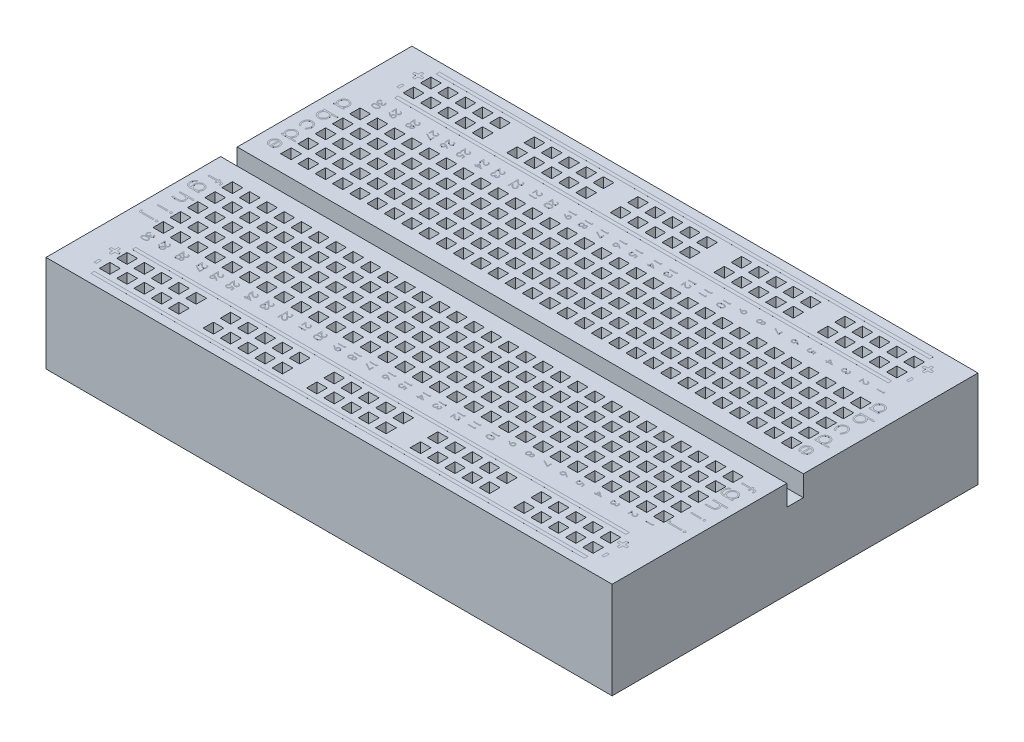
SolidWorks part; units mm, degrees
ref_plane "Front Plane" through (0, 0, 0) normal (0, 0, 1) x (1, 0, 0)
ref_plane "Top Plane" through (0, 0, 0) normal (0, 1, 0) x (1, 0, 0)
ref_plane "Right Plane" through (0, 0, 0) normal (1, 0, 0) x (0, 0, -1)
sketch "Sketch1" plane through (0, 0, 0) normal (0, 1, 0) x (1, 0, 0)
  line L1 (41, 26.5) -> (-41, 26.5)
  line L2 (41, 26.5) -> (41, -26.5)
  line L3 (41, -26.5) -> (-41, -26.5)
  line L4 (-41, 26.5) -> (-41, -26.5)
  point P4 (0, 26.5)
  point P6 (41, 0)
  dimension "D1" = 82
  dimension "D2" = 53
extrude "Boss-Extrude1" add sketch "Sketch1" along normal blind 14.0041
sketch "Sketch2" plane through (41, 0, 0) normal (1, 0, 0) x (0, 0, -1)
  line L0 (-26.5, 14.0041) -> (26.5, 14.0041) construction
  line L1 (-1.2, 14.0041) -> (1.2, 14.0041)
  line L2 (1.2, 14.0041) -> (1.2, 11.0041)
  line L3 (1.2, 11.0041) -> (-1.2, 11.0041)
  line L4 (-1.2, 11.0041) -> (-1.2, 14.0041)
  point P4 (0, 11.0041)
  dimension "D1" = 2.4
  dimension "D2" = 3
extrude "Cut-Extrude1" cut sketch "Sketch2" against normal through all
sketch "Sketch3" plane through (0, 14.0041, 0) normal (0, 1, 0) x (1, 0, 0)
  line L0 (-41, 0) -> (41.7617, 0) construction
  line L1 (-41, -1.2) -> (-41, 1.2) construction
  line L2 (-34.5, -13.5) -> (-34.5, -15)
  line L3 (-37, -13.5) -> (-35.5, -13.5)
  line L4 (-37, -13.5) -> (-37, -15)
  line L5 (-37, -15) -> (-35.5, -15)
  line L6 (-35.5, -13.5) -> (-35.5, -15)
  line L7 (-34.5, -13.5) -> (-33, -13.5)
  line L8 (-33, -13.5) -> (-33, -15)
  line L9 (-34.5, -15) -> (-33, -15)
  line L10 (-32, -13.5) -> (-32, -15)
  line L11 (-32, -13.5) -> (-30.5, -13.5)
  line L12 (-30.5, -13.5) -> (-30.5, -15)
  line L13 (-32, -15) -> (-30.5, -15)
  line L14 (-29.5, -13.5) -> (-29.5, -15)
  line L15 (-29.5, -13.5) -> (-28, -13.5)
  line L16 (-28, -13.5) -> (-28, -15)
  line L17 (-29.5, -15) -> (-28, -15)
  line L18 (-27, -13.5) -> (-27, -15)
  line L19 (-27, -13.5) -> (-25.5, -13.5)
  line L20 (-25.5, -13.5) -> (-25.5, -15)
  line L21 (-27, -15) -> (-25.5, -15)
  line L22 (-24.5, -13.5) -> (-24.5, -15)
  line L23 (-24.5, -13.5) -> (-23, -13.5)
  line L24 (-23, -13.5) -> (-23, -15)
  line L25 (-24.5, -15) -> (-23, -15)
  line L26 (-22, -13.5) -> (-22, -15)
  line L27 (-22, -13.5) -> (-20.5, -13.5)
  line L28 (-20.5, -13.5) -> (-20.5, -15)
  line L29 (-22, -15) -> (-20.5, -15)
  line L30 (-19.5, -13.5) -> (-19.5, -15)
  line L31 (-19.5, -13.5) -> (-18, -13.5)
  line L32 (-18, -13.5) -> (-18, -15)
  line L33 (-19.5, -15) -> (-18, -15)
  line L34 (-17, -13.5) -> (-17, -15)
  line L35 (-17, -13.5) -> (-15.5, -13.5)
  line L36 (-15.5, -13.5) -> (-15.5, -15)
  line L37 (-17, -15) -> (-15.5, -15)
  line L38 (-14.5, -13.5) -> (-14.5, -15)
  line L39 (-14.5, -13.5) -> (-13, -13.5)
  line L40 (-13, -13.5) -> (-13, -15)
  line L41 (-14.5, -15) -> (-13, -15)
  line L42 (-12, -13.5) -> (-12, -15)
  line L43 (-12, -13.5) -> (-10.5, -13.5)
  line L44 (-10.5, -13.5) -> (-10.5, -15)
  line L45 (-12, -15) -> (-10.5, -15)
  line L46 (-9.5, -13.5) -> (-9.5, -15)
  line L47 (-9.5, -13.5) -> (-8, -13.5)
  line L48 (-8, -13.5) -> (-8, -15)
  line L49 (-9.5, -15) -> (-8, -15)
  line L50 (-7, -13.5) -> (-7, -15)
  line L51 (-7, -13.5) -> (-5.5, -13.5)
  line L52 (-5.5, -13.5) -> (-5.5, -15)
  line L53 (-7, -15) -> (-5.5, -15)
  line L54 (-4.5, -13.5) -> (-4.5, -15)
  line L55 (-4.5, -13.5) -> (-3, -13.5)
  line L56 (-3, -13.5) -> (-3, -15)
  line L57 (-4.5, -15) -> (-3, -15)
  line L58 (-2, -13.5) -> (-2, -15)
  line L59 (-2, -13.5) -> (-0.5, -13.5)
  line L60 (-0.5, -13.5) -> (-0.5, -15)
  line L61 (-2, -15) -> (-0.5, -15)
  line L62 (0.5, -13.5) -> (0.5, -15)
  line L63 (0.5, -13.5) -> (2, -13.5)
  line L64 (2, -13.5) -> (2, -15)
  line L65 (0.5, -15) -> (2, -15)
  line L66 (3, -13.5) -> (3, -15)
  line L67 (3, -13.5) -> (4.5, -13.5)
  line L68 (4.5, -13.5) -> (4.5, -15)
  line L69 (3, -15) -> (4.5, -15)
  line L70 (5.5, -13.5) -> (5.5, -15)
  line L71 (5.5, -13.5) -> (7, -13.5)
  line L72 (7, -13.5) -> (7, -15)
  line L73 (5.5, -15) -> (7, -15)
  line L74 (8, -13.5) -> (8, -15)
  line L75 (8, -13.5) -> (9.5, -13.5)
  line L76 (9.5, -13.5) -> (9.5, -15)
  line L77 (8, -15) -> (9.5, -15)
  line L78 (10.5, -13.5) -> (10.5, -15)
  line L79 (10.5, -13.5) -> (12, -13.5)
  line L80 (12, -13.5) -> (12, -15)
  line L81 (10.5, -15) -> (12, -15)
  line L82 (13, -13.5) -> (13, -15)
  line L83 (13, -13.5) -> (14.5, -13.5)
  line L84 (14.5, -13.5) -> (14.5, -15)
  line L85 (13, -15) -> (14.5, -15)
  line L86 (15.5, -13.5) -> (15.5, -15)
  line L87 (15.5, -13.5) -> (17, -13.5)
  line L88 (17, -13.5) -> (17, -15)
  line L89 (15.5, -15) -> (17, -15)
  line L90 (18, -13.5) -> (18, -15)
  line L91 (18, -13.5) -> (19.5, -13.5)
  line L92 (19.5, -13.5) -> (19.5, -15)
  line L93 (18, -15) -> (19.5, -15)
  line L94 (20.5, -13.5) -> (20.5, -15)
  line L95 (20.5, -13.5) -> (22, -13.5)
  line L96 (22, -13.5) -> (22, -15)
  line L97 (20.5, -15) -> (22, -15)
  line L98 (23, -13.5) -> (23, -15)
  line L99 (23, -13.5) -> (24.5, -13.5)
  line L100 (24.5, -13.5) -> (24.5, -15)
  line L101 (23, -15) -> (24.5, -15)
  line L102 (25.5, -13.5) -> (25.5, -15)
  line L103 (25.5, -13.5) -> (27, -13.5)
  line L104 (27, -13.5) -> (27, -15)
  line L105 (25.5, -15) -> (27, -15)
  line L106 (28, -13.5) -> (28, -15)
  line L107 (28, -13.5) -> (29.5, -13.5)
  line L108 (29.5, -13.5) -> (29.5, -15)
  line L109 (28, -15) -> (29.5, -15)
  line L110 (30.5, -13.5) -> (30.5, -15)
  line L111 (30.5, -13.5) -> (32, -13.5)
  line L112 (32, -13.5) -> (32, -15)
  line L113 (30.5, -15) -> (32, -15)
  line L114 (33, -13.5) -> (33, -15)
  line L115 (33, -13.5) -> (34.5, -13.5)
  line L116 (34.5, -13.5) -> (34.5, -15)
  line L117 (33, -15) -> (34.5, -15)
  line L118 (35.5, -13.5) -> (35.5, -15)
  line L119 (35.5, -13.5) -> (37, -13.5)
  line L120 (37, -13.5) -> (37, -15)
  line L121 (35.5, -15) -> (37, -15)
  line L122 (-34.5, -11) -> (-34.5, -12.5)
  line L123 (-34.5, -11) -> (-33, -11)
  line L124 (-33, -11) -> (-33, -12.5)
  line L125 (-34.5, -12.5) -> (-33, -12.5)
  line L126 (-32, -11) -> (-32, -12.5)
  line L127 (-32, -11) -> (-30.5, -11)
  line L128 (-30.5, -11) -> (-30.5, -12.5)
  line L129 (-32, -12.5) -> (-30.5, -12.5)
  line L130 (-29.5, -11) -> (-29.5, -12.5)
  line L131 (-29.5, -11) -> (-28, -11)
  line L132 (-28, -11) -> (-28, -12.5)
  line L133 (-29.5, -12.5) -> (-28, -12.5)
  line L134 (-27, -11) -> (-27, -12.5)
  line L135 (-27, -11) -> (-25.5, -11)
  line L136 (-25.5, -11) -> (-25.5, -12.5)
  line L137 (-27, -12.5) -> (-25.5, -12.5)
  line L138 (-24.5, -11) -> (-24.5, -12.5)
  line L139 (-24.5, -11) -> (-23, -11)
  line L140 (-23, -11) -> (-23, -12.5)
  line L141 (-24.5, -12.5) -> (-23, -12.5)
  line L142 (-22, -11) -> (-22, -12.5)
  line L143 (-22, -11) -> (-20.5, -11)
  line L144 (-20.5, -11) -> (-20.5, -12.5)
  line L145 (-22, -12.5) -> (-20.5, -12.5)
  line L146 (-19.5, -11) -> (-19.5, -12.5)
  line L147 (-19.5, -11) -> (-18, -11)
  line L148 (-18, -11) -> (-18, -12.5)
  line L149 (-19.5, -12.5) -> (-18, -12.5)
  line L150 (-17, -11) -> (-17, -12.5)
  line L151 (-17, -11) -> (-15.5, -11)
  line L152 (-15.5, -11) -> (-15.5, -12.5)
  line L153 (-17, -12.5) -> (-15.5, -12.5)
  line L154 (-14.5, -11) -> (-14.5, -12.5)
  line L155 (-14.5, -11) -> (-13, -11)
  line L156 (-13, -11) -> (-13, -12.5)
  line L157 (-14.5, -12.5) -> (-13, -12.5)
  line L158 (-12, -11) -> (-12, -12.5)
  line L159 (-12, -11) -> (-10.5, -11)
  line L160 (-10.5, -11) -> (-10.5, -12.5)
  line L161 (-12, -12.5) -> (-10.5, -12.5)
  line L162 (-9.5, -11) -> (-9.5, -12.5)
  line L163 (-9.5, -11) -> (-8, -11)
  line L164 (-8, -11) -> (-8, -12.5)
  line L165 (-9.5, -12.5) -> (-8, -12.5)
  line L166 (-7, -11) -> (-7, -12.5)
  line L167 (-7, -11) -> (-5.5, -11)
  line L168 (-5.5, -11) -> (-5.5, -12.5)
  line L169 (-7, -12.5) -> (-5.5, -12.5)
  line L170 (-4.5, -11) -> (-4.5, -12.5)
  line L171 (-4.5, -11) -> (-3, -11)
  line L172 (-3, -11) -> (-3, -12.5)
  line L173 (-4.5, -12.5) -> (-3, -12.5)
  line L174 (-2, -11) -> (-2, -12.5)
  line L175 (-2, -11) -> (-0.5, -11)
  line L176 (-0.5, -11) -> (-0.5, -12.5)
  line L177 (-2, -12.5) -> (-0.5, -12.5)
  line L178 (0.5, -11) -> (0.5, -12.5)
  line L179 (0.5, -11) -> (2, -11)
  line L180 (2, -11) -> (2, -12.5)
  line L181 (0.5, -12.5) -> (2, -12.5)
  line L182 (3, -11) -> (3, -12.5)
  line L183 (3, -11) -> (4.5, -11)
  line L184 (4.5, -11) -> (4.5, -12.5)
  line L185 (3, -12.5) -> (4.5, -12.5)
  line L186 (5.5, -11) -> (5.5, -12.5)
  line L187 (5.5, -11) -> (7, -11)
  line L188 (7, -11) -> (7, -12.5)
  line L189 (5.5, -12.5) -> (7, -12.5)
  line L190 (8, -11) -> (8, -12.5)
  line L191 (8, -11) -> (9.5, -11)
  line L192 (9.5, -11) -> (9.5, -12.5)
  line L193 (8, -12.5) -> (9.5, -12.5)
  line L194 (10.5, -11) -> (10.5, -12.5)
  line L195 (10.5, -11) -> (12, -11)
  line L196 (12, -11) -> (12, -12.5)
  line L197 (10.5, -12.5) -> (12, -12.5)
  line L198 (13, -11) -> (13, -12.5)
  line L199 (13, -11) -> (14.5, -11)
  line L200 (14.5, -11) -> (14.5, -12.5)
  line L201 (13, -12.5) -> (14.5, -12.5)
  line L202 (15.5, -11) -> (15.5, -12.5)
  line L203 (15.5, -11) -> (17, -11)
  line L204 (17, -11) -> (17, -12.5)
  line L205 (15.5, -12.5) -> (17, -12.5)
  line L206 (18, -11) -> (18, -12.5)
  line L207 (18, -11) -> (19.5, -11)
  line L208 (19.5, -11) -> (19.5, -12.5)
  line L209 (18, -12.5) -> (19.5, -12.5)
  line L210 (20.5, -11) -> (20.5, -12.5)
  line L211 (20.5, -11) -> (22, -11)
  line L212 (22, -11) -> (22, -12.5)
  line L213 (20.5, -12.5) -> (22, -12.5)
  line L214 (23, -11) -> (23, -12.5)
  line L215 (23, -11) -> (24.5, -11)
  line L216 (24.5, -11) -> (24.5, -12.5)
  line L217 (23, -12.5) -> (24.5, -12.5)
  line L218 (25.5, -11) -> (25.5, -12.5)
  line L219 (25.5, -11) -> (27, -11)
  line L220 (27, -11) -> (27, -12.5)
  line L221 (25.5, -12.5) -> (27, -12.5)
  line L222 (28, -11) -> (28, -12.5)
  line L223 (28, -11) -> (29.5, -11)
  line L224 (29.5, -11) -> (29.5, -12.5)
  line L225 (28, -12.5) -> (29.5, -12.5)
  line L226 (30.5, -11) -> (30.5, -12.5)
  line L227 (30.5, -11) -> (32, -11)
  line L228 (32, -11) -> (32, -12.5)
  line L229 (30.5, -12.5) -> (32, -12.5)
  line L230 (33, -11) -> (33, -12.5)
  line L231 (33, -11) -> (34.5, -11)
  line L232 (34.5, -11) -> (34.5, -12.5)
  line L233 (33, -12.5) -> (34.5, -12.5)
  line L234 (35.5, -11) -> (35.5, -12.5)
  line L235 (35.5, -11) -> (37, -11)
  line L236 (37, -11) -> (37, -12.5)
  line L237 (35.5, -12.5) -> (37, -12.5)
  line L238 (-34.5, -8.5) -> (-34.5, -10)
  line L239 (-34.5, -8.5) -> (-33, -8.5)
  line L240 (-33, -8.5) -> (-33, -10)
  line L241 (-34.5, -10) -> (-33, -10)
  line L242 (-32, -8.5) -> (-32, -10)
  line L243 (-32, -8.5) -> (-30.5, -8.5)
  line L244 (-30.5, -8.5) -> (-30.5, -10)
  line L245 (-32, -10) -> (-30.5, -10)
  line L246 (-29.5, -8.5) -> (-29.5, -10)
  line L247 (-29.5, -8.5) -> (-28, -8.5)
  line L248 (-28, -8.5) -> (-28, -10)
  line L249 (-29.5, -10) -> (-28, -10)
  line L250 (-27, -8.5) -> (-27, -10)
  line L251 (-27, -8.5) -> (-25.5, -8.5)
  line L252 (-25.5, -8.5) -> (-25.5, -10)
  line L253 (-27, -10) -> (-25.5, -10)
  line L254 (-24.5, -8.5) -> (-24.5, -10)
  line L255 (-24.5, -8.5) -> (-23, -8.5)
  line L256 (-23, -8.5) -> (-23, -10)
  line L257 (-24.5, -10) -> (-23, -10)
  line L258 (-22, -8.5) -> (-22, -10)
  line L259 (-22, -8.5) -> (-20.5, -8.5)
  line L260 (-20.5, -8.5) -> (-20.5, -10)
  line L261 (-22, -10) -> (-20.5, -10)
  line L262 (-19.5, -8.5) -> (-19.5, -10)
  line L263 (-19.5, -8.5) -> (-18, -8.5)
  line L264 (-18, -8.5) -> (-18, -10)
  line L265 (-19.5, -10) -> (-18, -10)
  line L266 (-17, -8.5) -> (-17, -10)
  line L267 (-17, -8.5) -> (-15.5, -8.5)
  line L268 (-15.5, -8.5) -> (-15.5, -10)
  line L269 (-17, -10) -> (-15.5, -10)
  line L270 (-14.5, -8.5) -> (-14.5, -10)
  line L271 (-14.5, -8.5) -> (-13, -8.5)
  line L272 (-13, -8.5) -> (-13, -10)
  line L273 (-14.5, -10) -> (-13, -10)
  line L274 (-12, -8.5) -> (-12, -10)
  line L275 (-12, -8.5) -> (-10.5, -8.5)
  line L276 (-10.5, -8.5) -> (-10.5, -10)
  line L277 (-12, -10) -> (-10.5, -10)
  line L278 (-9.5, -8.5) -> (-9.5, -10)
  line L279 (-9.5, -8.5) -> (-8, -8.5)
  line L280 (-8, -8.5) -> (-8, -10)
  line L281 (-9.5, -10) -> (-8, -10)
  line L282 (-7, -8.5) -> (-7, -10)
  line L283 (-7, -8.5) -> (-5.5, -8.5)
  line L284 (-5.5, -8.5) -> (-5.5, -10)
  line L285 (-7, -10) -> (-5.5, -10)
  line L286 (-4.5, -8.5) -> (-4.5, -10)
  line L287 (-4.5, -8.5) -> (-3, -8.5)
  line L288 (-3, -8.5) -> (-3, -10)
  line L289 (-4.5, -10) -> (-3, -10)
  line L290 (-2, -8.5) -> (-2, -10)
  line L291 (-2, -8.5) -> (-0.5, -8.5)
  line L292 (-0.5, -8.5) -> (-0.5, -10)
  line L293 (-2, -10) -> (-0.5, -10)
  line L294 (0.5, -8.5) -> (0.5, -10)
  line L295 (0.5, -8.5) -> (2, -8.5)
  line L296 (2, -8.5) -> (2, -10)
  line L297 (0.5, -10) -> (2, -10)
  line L298 (3, -8.5) -> (3, -10)
  line L299 (3, -8.5) -> (4.5, -8.5)
  line L300 (4.5, -8.5) -> (4.5, -10)
  line L301 (3, -10) -> (4.5, -10)
  line L302 (5.5, -8.5) -> (5.5, -10)
  line L303 (5.5, -8.5) -> (7, -8.5)
  line L304 (7, -8.5) -> (7, -10)
  line L305 (5.5, -10) -> (7, -10)
  line L306 (8, -8.5) -> (8, -10)
  line L307 (8, -8.5) -> (9.5, -8.5)
  line L308 (9.5, -8.5) -> (9.5, -10)
  line L309 (8, -10) -> (9.5, -10)
  line L310 (10.5, -8.5) -> (10.5, -10)
  line L311 (10.5, -8.5) -> (12, -8.5)
  line L312 (12, -8.5) -> (12, -10)
  line L313 (10.5, -10) -> (12, -10)
  line L314 (13, -8.5) -> (13, -10)
  line L315 (13, -8.5) -> (14.5, -8.5)
  line L316 (14.5, -8.5) -> (14.5, -10)
  line L317 (13, -10) -> (14.5, -10)
  line L318 (15.5, -8.5) -> (15.5, -10)
  line L319 (15.5, -8.5) -> (17, -8.5)
  line L320 (17, -8.5) -> (17, -10)
  line L321 (15.5, -10) -> (17, -10)
  line L322 (18, -8.5) -> (18, -10)
  line L323 (18, -8.5) -> (19.5, -8.5)
  line L324 (19.5, -8.5) -> (19.5, -10)
  line L325 (18, -10) -> (19.5, -10)
  line L326 (20.5, -8.5) -> (20.5, -10)
  line L327 (20.5, -8.5) -> (22, -8.5)
  line L328 (22, -8.5) -> (22, -10)
  line L329 (20.5, -10) -> (22, -10)
  line L330 (23, -8.5) -> (23, -10)
  line L331 (23, -8.5) -> (24.5, -8.5)
  line L332 (24.5, -8.5) -> (24.5, -10)
  line L333 (23, -10) -> (24.5, -10)
  line L334 (25.5, -8.5) -> (25.5, -10)
  line L335 (25.5, -8.5) -> (27, -8.5)
  line L336 (27, -8.5) -> (27, -10)
  line L337 (25.5, -10) -> (27, -10)
  line L338 (28, -8.5) -> (28, -10)
  line L339 (28, -8.5) -> (29.5, -8.5)
  line L340 (29.5, -8.5) -> (29.5, -10)
  line L341 (28, -10) -> (29.5, -10)
  line L342 (30.5, -8.5) -> (30.5, -10)
  line L343 (30.5, -8.5) -> (32, -8.5)
  line L344 (32, -8.5) -> (32, -10)
  line L345 (30.5, -10) -> (32, -10)
  line L346 (33, -8.5) -> (33, -10)
  line L347 (33, -8.5) -> (34.5, -8.5)
  line L348 (34.5, -8.5) -> (34.5, -10)
  line L349 (33, -10) -> (34.5, -10)
  line L350 (35.5, -8.5) -> (35.5, -10)
  line L351 (35.5, -8.5) -> (37, -8.5)
  line L352 (37, -8.5) -> (37, -10)
  line L353 (35.5, -10) -> (37, -10)
  line L354 (-34.5, -6) -> (-34.5, -7.5)
  line L355 (-34.5, -6) -> (-33, -6)
  line L356 (-33, -6) -> (-33, -7.5)
  line L357 (-34.5, -7.5) -> (-33, -7.5)
  line L358 (-32, -6) -> (-32, -7.5)
  line L359 (-32, -6) -> (-30.5, -6)
  line L360 (-30.5, -6) -> (-30.5, -7.5)
  line L361 (-32, -7.5) -> (-30.5, -7.5)
  line L362 (-29.5, -6) -> (-29.5, -7.5)
  line L363 (-29.5, -6) -> (-28, -6)
  line L364 (-28, -6) -> (-28, -7.5)
  line L365 (-29.5, -7.5) -> (-28, -7.5)
  line L366 (-27, -6) -> (-27, -7.5)
  line L367 (-27, -6) -> (-25.5, -6)
  line L368 (-25.5, -6) -> (-25.5, -7.5)
  line L369 (-27, -7.5) -> (-25.5, -7.5)
  line L370 (-24.5, -6) -> (-24.5, -7.5)
  line L371 (-24.5, -6) -> (-23, -6)
  line L372 (-23, -6) -> (-23, -7.5)
  line L373 (-24.5, -7.5) -> (-23, -7.5)
  line L374 (-22, -6) -> (-22, -7.5)
  line L375 (-22, -6) -> (-20.5, -6)
  line L376 (-20.5, -6) -> (-20.5, -7.5)
  line L377 (-22, -7.5) -> (-20.5, -7.5)
  line L378 (-19.5, -6) -> (-19.5, -7.5)
  line L379 (-19.5, -6) -> (-18, -6)
  line L380 (-18, -6) -> (-18, -7.5)
  line L381 (-19.5, -7.5) -> (-18, -7.5)
  line L382 (-17, -6) -> (-17, -7.5)
  line L383 (-17, -6) -> (-15.5, -6)
  line L384 (-15.5, -6) -> (-15.5, -7.5)
  line L385 (-17, -7.5) -> (-15.5, -7.5)
  line L386 (-14.5, -6) -> (-14.5, -7.5)
  line L387 (-14.5, -6) -> (-13, -6)
  line L388 (-13, -6) -> (-13, -7.5)
  line L389 (-14.5, -7.5) -> (-13, -7.5)
  line L390 (-12, -6) -> (-12, -7.5)
  line L391 (-12, -6) -> (-10.5, -6)
  line L392 (-10.5, -6) -> (-10.5, -7.5)
  line L393 (-12, -7.5) -> (-10.5, -7.5)
  line L394 (-9.5, -6) -> (-9.5, -7.5)
  line L395 (-9.5, -6) -> (-8, -6)
  line L396 (-8, -6) -> (-8, -7.5)
  line L397 (-9.5, -7.5) -> (-8, -7.5)
  line L398 (-7, -6) -> (-7, -7.5)
  line L399 (-7, -6) -> (-5.5, -6)
  line L400 (-5.5, -6) -> (-5.5, -7.5)
  line L401 (-7, -7.5) -> (-5.5, -7.5)
  line L402 (-4.5, -6) -> (-4.5, -7.5)
  line L403 (-4.5, -6) -> (-3, -6)
  line L404 (-3, -6) -> (-3, -7.5)
  line L405 (-4.5, -7.5) -> (-3, -7.5)
  line L406 (-2, -6) -> (-2, -7.5)
  line L407 (-2, -6) -> (-0.5, -6)
  line L408 (-0.5, -6) -> (-0.5, -7.5)
  line L409 (-2, -7.5) -> (-0.5, -7.5)
  line L410 (0.5, -6) -> (0.5, -7.5)
  line L411 (0.5, -6) -> (2, -6)
  line L412 (2, -6) -> (2, -7.5)
  line L413 (0.5, -7.5) -> (2, -7.5)
  line L414 (3, -6) -> (3, -7.5)
  line L415 (3, -6) -> (4.5, -6)
  line L416 (4.5, -6) -> (4.5, -7.5)
  line L417 (3, -7.5) -> (4.5, -7.5)
  line L418 (5.5, -6) -> (5.5, -7.5)
  line L419 (5.5, -6) -> (7, -6)
  line L420 (7, -6) -> (7, -7.5)
  line L421 (5.5, -7.5) -> (7, -7.5)
  line L422 (8, -6) -> (8, -7.5)
  line L423 (8, -6) -> (9.5, -6)
  line L424 (9.5, -6) -> (9.5, -7.5)
  line L425 (8, -7.5) -> (9.5, -7.5)
  line L426 (10.5, -6) -> (10.5, -7.5)
  line L427 (10.5, -6) -> (12, -6)
  line L428 (12, -6) -> (12, -7.5)
  line L429 (10.5, -7.5) -> (12, -7.5)
  line L430 (13, -6) -> (13, -7.5)
  line L431 (13, -6) -> (14.5, -6)
  line L432 (14.5, -6) -> (14.5, -7.5)
  line L433 (13, -7.5) -> (14.5, -7.5)
  line L434 (15.5, -6) -> (15.5, -7.5)
  line L435 (15.5, -6) -> (17, -6)
  line L436 (17, -6) -> (17, -7.5)
  line L437 (15.5, -7.5) -> (17, -7.5)
  line L438 (18, -6) -> (18, -7.5)
  line L439 (18, -6) -> (19.5, -6)
  line L440 (19.5, -6) -> (19.5, -7.5)
  line L441 (18, -7.5) -> (19.5, -7.5)
  line L442 (20.5, -6) -> (20.5, -7.5)
  line L443 (20.5, -6) -> (22, -6)
  line L444 (22, -6) -> (22, -7.5)
  line L445 (20.5, -7.5) -> (22, -7.5)
  line L446 (23, -6) -> (23, -7.5)
  line L447 (23, -6) -> (24.5, -6)
  line L448 (24.5, -6) -> (24.5, -7.5)
  line L449 (23, -7.5) -> (24.5, -7.5)
  line L450 (25.5, -6) -> (25.5, -7.5)
  line L451 (25.5, -6) -> (27, -6)
  line L452 (27, -6) -> (27, -7.5)
  line L453 (25.5, -7.5) -> (27, -7.5)
  line L454 (28, -6) -> (28, -7.5)
  line L455 (28, -6) -> (29.5, -6)
  line L456 (29.5, -6) -> (29.5, -7.5)
  line L457 (28, -7.5) -> (29.5, -7.5)
  line L458 (30.5, -6) -> (30.5, -7.5)
  line L459 (30.5, -6) -> (32, -6)
  line L460 (32, -6) -> (32, -7.5)
  line L461 (30.5, -7.5) -> (32, -7.5)
  line L462 (33, -6) -> (33, -7.5)
  line L463 (33, -6) -> (34.5, -6)
  line L464 (34.5, -6) -> (34.5, -7.5)
  line L465 (33, -7.5) -> (34.5, -7.5)
  line L466 (35.5, -6) -> (35.5, -7.5)
  line L467 (35.5, -6) -> (37, -6)
  line L468 (37, -6) -> (37, -7.5)
  line L469 (35.5, -7.5) -> (37, -7.5)
  line L470 (-34.5, -3.5) -> (-34.5, -5)
  line L471 (-34.5, -3.5) -> (-33, -3.5)
  line L472 (-33, -3.5) -> (-33, -5)
  line L473 (-34.5, -5) -> (-33, -5)
  line L474 (-32, -3.5) -> (-32, -5)
  line L475 (-32, -3.5) -> (-30.5, -3.5)
  line L476 (-30.5, -3.5) -> (-30.5, -5)
  line L477 (-32, -5) -> (-30.5, -5)
  line L478 (-29.5, -3.5) -> (-29.5, -5)
  line L479 (-29.5, -3.5) -> (-28, -3.5)
  line L480 (-28, -3.5) -> (-28, -5)
  line L481 (-29.5, -5) -> (-28, -5)
  line L482 (-27, -3.5) -> (-27, -5)
  line L483 (-27, -3.5) -> (-25.5, -3.5)
  line L484 (-25.5, -3.5) -> (-25.5, -5)
  line L485 (-27, -5) -> (-25.5, -5)
  line L486 (-24.5, -3.5) -> (-24.5, -5)
  line L487 (-24.5, -3.5) -> (-23, -3.5)
  line L488 (-23, -3.5) -> (-23, -5)
  line L489 (-24.5, -5) -> (-23, -5)
  line L490 (-22, -3.5) -> (-22, -5)
  line L491 (-22, -3.5) -> (-20.5, -3.5)
  line L492 (-20.5, -3.5) -> (-20.5, -5)
  line L493 (-22, -5) -> (-20.5, -5)
  line L494 (-19.5, -3.5) -> (-19.5, -5)
  line L495 (-19.5, -3.5) -> (-18, -3.5)
  line L496 (-18, -3.5) -> (-18, -5)
  line L497 (-19.5, -5) -> (-18, -5)
  line L498 (-17, -3.5) -> (-17, -5)
  line L499 (-17, -3.5) -> (-15.5, -3.5)
  line L500 (-15.5, -3.5) -> (-15.5, -5)
  line L501 (-17, -5) -> (-15.5, -5)
  line L502 (-14.5, -3.5) -> (-14.5, -5)
  line L503 (-14.5, -3.5) -> (-13, -3.5)
  line L504 (-13, -3.5) -> (-13, -5)
  line L505 (-14.5, -5) -> (-13, -5)
  line L506 (-12, -3.5) -> (-12, -5)
  line L507 (-12, -3.5) -> (-10.5, -3.5)
  line L508 (-10.5, -3.5) -> (-10.5, -5)
  line L509 (-12, -5) -> (-10.5, -5)
  line L510 (-9.5, -3.5) -> (-9.5, -5)
  line L511 (-9.5, -3.5) -> (-8, -3.5)
  line L512 (-8, -3.5) -> (-8, -5)
  line L513 (-9.5, -5) -> (-8, -5)
  line L514 (-7, -3.5) -> (-7, -5)
  line L515 (-7, -3.5) -> (-5.5, -3.5)
  line L516 (-5.5, -3.5) -> (-5.5, -5)
  line L517 (-7, -5) -> (-5.5, -5)
  line L518 (-4.5, -3.5) -> (-4.5, -5)
  line L519 (-4.5, -3.5) -> (-3, -3.5)
  line L520 (-3, -3.5) -> (-3, -5)
  line L521 (-4.5, -5) -> (-3, -5)
  line L522 (-2, -3.5) -> (-2, -5)
  line L523 (-2, -3.5) -> (-0.5, -3.5)
  line L524 (-0.5, -3.5) -> (-0.5, -5)
  line L525 (-2, -5) -> (-0.5, -5)
  line L526 (0.5, -3.5) -> (0.5, -5)
  line L527 (0.5, -3.5) -> (2, -3.5)
  line L528 (2, -3.5) -> (2, -5)
  line L529 (0.5, -5) -> (2, -5)
  line L530 (3, -3.5) -> (3, -5)
  line L531 (3, -3.5) -> (4.5, -3.5)
  line L532 (4.5, -3.5) -> (4.5, -5)
  line L533 (3, -5) -> (4.5, -5)
  line L534 (5.5, -3.5) -> (5.5, -5)
  line L535 (5.5, -3.5) -> (7, -3.5)
  line L536 (7, -3.5) -> (7, -5)
  line L537 (5.5, -5) -> (7, -5)
  line L538 (8, -3.5) -> (8, -5)
  line L539 (8, -3.5) -> (9.5, -3.5)
  line L540 (9.5, -3.5) -> (9.5, -5)
  line L541 (8, -5) -> (9.5, -5)
  line L542 (10.5, -3.5) -> (10.5, -5)
  line L543 (10.5, -3.5) -> (12, -3.5)
  line L544 (12, -3.5) -> (12, -5)
  line L545 (10.5, -5) -> (12, -5)
  line L546 (13, -3.5) -> (13, -5)
  line L547 (13, -3.5) -> (14.5, -3.5)
  line L548 (14.5, -3.5) -> (14.5, -5)
  line L549 (13, -5) -> (14.5, -5)
  line L550 (15.5, -3.5) -> (15.5, -5)
  line L551 (15.5, -3.5) -> (17, -3.5)
  line L552 (17, -3.5) -> (17, -5)
  line L553 (15.5, -5) -> (17, -5)
  line L554 (18, -3.5) -> (18, -5)
  line L555 (18, -3.5) -> (19.5, -3.5)
  line L556 (19.5, -3.5) -> (19.5, -5)
  line L557 (18, -5) -> (19.5, -5)
  line L558 (20.5, -3.5) -> (20.5, -5)
  line L559 (20.5, -3.5) -> (22, -3.5)
  line L560 (22, -3.5) -> (22, -5)
  line L561 (20.5, -5) -> (22, -5)
  line L562 (23, -3.5) -> (23, -5)
  line L563 (23, -3.5) -> (24.5, -3.5)
  line L564 (24.5, -3.5) -> (24.5, -5)
  line L565 (23, -5) -> (24.5, -5)
  line L566 (25.5, -3.5) -> (25.5, -5)
  line L567 (25.5, -3.5) -> (27, -3.5)
  line L568 (27, -3.5) -> (27, -5)
  line L569 (25.5, -5) -> (27, -5)
  line L570 (28, -3.5) -> (28, -5)
  line L571 (28, -3.5) -> (29.5, -3.5)
  line L572 (29.5, -3.5) -> (29.5, -5)
  line L573 (28, -5) -> (29.5, -5)
  line L574 (30.5, -3.5) -> (30.5, -5)
  line L575 (30.5, -3.5) -> (32, -3.5)
  line L576 (32, -3.5) -> (32, -5)
  line L577 (30.5, -5) -> (32, -5)
  line L578 (33, -3.5) -> (33, -5)
  line L579 (33, -3.5) -> (34.5, -3.5)
  line L580 (34.5, -3.5) -> (34.5, -5)
  line L581 (33, -5) -> (34.5, -5)
  line L582 (35.5, -3.5) -> (35.5, -5)
  line L583 (35.5, -3.5) -> (37, -3.5)
  line L584 (37, -3.5) -> (37, -5)
  line L585 (35.5, -5) -> (37, -5)
  line L586 (-37, -11) -> (-37, -12.5)
  line L587 (-37, -11) -> (-35.5, -11)
  line L588 (-35.5, -11) -> (-35.5, -12.5)
  line L589 (-37, -12.5) -> (-35.5, -12.5)
  line L590 (-37, -8.5) -> (-37, -10)
  line L591 (-37, -8.5) -> (-35.5, -8.5)
  line L592 (-35.5, -8.5) -> (-35.5, -10)
  line L593 (-37, -10) -> (-35.5, -10)
  line L594 (-37, -6) -> (-37, -7.5)
  line L595 (-37, -6) -> (-35.5, -6)
  line L596 (-35.5, -6) -> (-35.5, -7.5)
  line L597 (-37, -7.5) -> (-35.5, -7.5)
  line L598 (-37, -3.5) -> (-37, -5)
  line L599 (-37, -3.5) -> (-35.5, -3.5)
  line L600 (-35.5, -3.5) -> (-35.5, -5)
  line L601 (-37, -5) -> (-35.5, -5)
  line L602 (-41, -1.2) -> (-41, -26.5) construction
  line L603 (-41, -26.5) -> (41, -26.5) construction
  line L607 (-35.75, -22.5) -> (-35.75, -24)
  line L608 (-35.75, -22.5) -> (-34.25, -22.5)
  line L609 (-34.25, -22.5) -> (-34.25, -24)
  line L610 (-35.75, -24) -> (-34.25, -24)
  line L611 (-33.25, -22.5) -> (-33.25, -24)
  line L612 (-33.25, -22.5) -> (-31.75, -22.5)
  line L613 (-31.75, -22.5) -> (-31.75, -24)
  line L614 (-33.25, -24) -> (-31.75, -24)
  line L615 (-30.75, -22.5) -> (-30.75, -24)
  line L616 (-30.75, -22.5) -> (-29.25, -22.5)
  line L617 (-29.25, -22.5) -> (-29.25, -24)
  line L618 (-30.75, -24) -> (-29.25, -24)
  line L619 (-28.25, -22.5) -> (-28.25, -24)
  line L620 (-28.25, -22.5) -> (-26.75, -22.5)
  line L621 (-26.75, -22.5) -> (-26.75, -24)
  line L622 (-28.25, -24) -> (-26.75, -24)
  line L623 (-25.75, -22.5) -> (-25.75, -24)
  line L624 (-25.75, -22.5) -> (-24.25, -22.5)
  line L625 (-24.25, -22.5) -> (-24.25, -24)
  line L626 (-25.75, -24) -> (-24.25, -24)
  line L707 (-33.25, -20) -> (-33.25, -21.5)
  line L708 (-33.25, -20) -> (-31.75, -20)
  line L709 (-31.75, -20) -> (-31.75, -21.5)
  line L710 (-33.25, -21.5) -> (-31.75, -21.5)
  line L711 (-30.75, -20) -> (-30.75, -21.5)
  line L712 (-30.75, -20) -> (-29.25, -20)
  line L713 (-29.25, -20) -> (-29.25, -21.5)
  line L714 (-30.75, -21.5) -> (-29.25, -21.5)
  line L715 (-28.25, -20) -> (-28.25, -21.5)
  line L716 (-28.25, -20) -> (-26.75, -20)
  line L717 (-26.75, -20) -> (-26.75, -21.5)
  line L718 (-28.25, -21.5) -> (-26.75, -21.5)
  line L719 (-25.75, -20) -> (-25.75, -21.5)
  line L720 (-25.75, -20) -> (-24.25, -20)
  line L721 (-24.25, -20) -> (-24.25, -21.5)
  line L722 (-25.75, -21.5) -> (-24.25, -21.5)
  line L803 (-35.75, -20) -> (-35.75, -21.5)
  line L804 (-35.75, -20) -> (-34.25, -20)
  line L805 (-34.25, -20) -> (-34.25, -21.5)
  line L806 (-35.75, -21.5) -> (-34.25, -21.5)
  line L807 (-23.25, -22.5) -> (-23.25, -24)
  line L808 (-23.25, -22.5) -> (-21.75, -22.5)
  line L809 (-21.75, -22.5) -> (-21.75, -24)
  line L810 (-23.25, -24) -> (-21.75, -24)
  line L811 (-20.75, -22.5) -> (-20.75, -24)
  line L812 (-20.75, -22.5) -> (-19.25, -22.5)
  line L813 (-19.25, -22.5) -> (-19.25, -24)
  line L814 (-20.75, -24) -> (-19.25, -24)
  line L815 (-18.25, -22.5) -> (-18.25, -24)
  line L816 (-18.25, -22.5) -> (-16.75, -22.5)
  line L817 (-16.75, -22.5) -> (-16.75, -24)
  line L818 (-18.25, -24) -> (-16.75, -24)
  line L819 (-15.75, -22.5) -> (-15.75, -24)
  line L820 (-15.75, -22.5) -> (-14.25, -22.5)
  line L821 (-14.25, -22.5) -> (-14.25, -24)
  line L822 (-15.75, -24) -> (-14.25, -24)
  line L823 (-13.25, -22.5) -> (-13.25, -24)
  line L824 (-13.25, -22.5) -> (-11.75, -22.5)
  line L825 (-11.75, -22.5) -> (-11.75, -24)
  line L826 (-13.25, -24) -> (-11.75, -24)
  line L827 (-10.75, -22.5) -> (-10.75, -24)
  line L828 (-10.75, -22.5) -> (-9.25, -22.5)
  line L829 (-9.25, -22.5) -> (-9.25, -24)
  line L830 (-10.75, -24) -> (-9.25, -24)
  line L831 (-8.25, -22.5) -> (-8.25, -24)
  line L832 (-8.25, -22.5) -> (-6.75, -22.5)
  line L833 (-6.75, -22.5) -> (-6.75, -24)
  line L834 (-8.25, -24) -> (-6.75, -24)
  line L835 (-5.75, -22.5) -> (-5.75, -24)
  line L836 (-5.75, -22.5) -> (-4.25, -22.5)
  line L837 (-4.25, -22.5) -> (-4.25, -24)
  line L838 (-5.75, -24) -> (-4.25, -24)
  line L839 (-3.25, -22.5) -> (-3.25, -24)
  line L840 (-3.25, -22.5) -> (-1.75, -22.5)
  line L841 (-1.75, -22.5) -> (-1.75, -24)
  line L842 (-3.25, -24) -> (-1.75, -24)
  line L843 (-0.75, -22.5) -> (-0.75, -24)
  line L844 (-0.75, -22.5) -> (0.75, -22.5)
  line L845 (0.75, -22.5) -> (0.75, -24)
  line L846 (-0.75, -24) -> (0.75, -24)
  line L847 (1.75, -22.5) -> (1.75, -24)
  line L848 (1.75, -22.5) -> (3.25, -22.5)
  line L849 (3.25, -22.5) -> (3.25, -24)
  line L850 (1.75, -24) -> (3.25, -24)
  line L851 (4.25, -22.5) -> (4.25, -24)
  line L852 (4.25, -22.5) -> (5.75, -22.5)
  line L853 (5.75, -22.5) -> (5.75, -24)
  line L854 (4.25, -24) -> (5.75, -24)
  line L855 (6.75, -22.5) -> (6.75, -24)
  line L856 (6.75, -22.5) -> (8.25, -22.5)
  line L857 (8.25, -22.5) -> (8.25, -24)
  line L858 (6.75, -24) -> (8.25, -24)
  line L859 (9.25, -22.5) -> (9.25, -24)
  line L860 (9.25, -22.5) -> (10.75, -22.5)
  line L861 (10.75, -22.5) -> (10.75, -24)
  line L862 (9.25, -24) -> (10.75, -24)
  line L863 (11.75, -22.5) -> (11.75, -24)
  line L864 (11.75, -22.5) -> (13.25, -22.5)
  line L865 (13.25, -22.5) -> (13.25, -24)
  line L866 (11.75, -24) -> (13.25, -24)
  line L867 (14.25, -22.5) -> (14.25, -24)
  line L868 (14.25, -22.5) -> (15.75, -22.5)
  line L869 (15.75, -22.5) -> (15.75, -24)
  line L870 (14.25, -24) -> (15.75, -24)
  line L871 (16.75, -22.5) -> (16.75, -24)
  line L872 (16.75, -22.5) -> (18.25, -22.5)
  line L873 (18.25, -22.5) -> (18.25, -24)
  line L874 (16.75, -24) -> (18.25, -24)
  line L875 (19.25, -22.5) -> (19.25, -24)
  line L876 (19.25, -22.5) -> (20.75, -22.5)
  line L877 (20.75, -22.5) -> (20.75, -24)
  line L878 (19.25, -24) -> (20.75, -24)
  line L879 (21.75, -22.5) -> (21.75, -24)
  line L880 (21.75, -22.5) -> (23.25, -22.5)
  line L881 (23.25, -22.5) -> (23.25, -24)
  line L882 (21.75, -24) -> (23.25, -24)
  line L883 (24.25, -22.5) -> (24.25, -24)
  line L884 (24.25, -22.5) -> (25.75, -22.5)
  line L885 (24.25, -24) -> (25.75, -24)
  line L886 (-23.25, -20) -> (-23.25, -21.5)
  line L887 (-23.25, -20) -> (-21.75, -20)
  line L888 (-21.75, -20) -> (-21.75, -21.5)
  line L889 (-23.25, -21.5) -> (-21.75, -21.5)
  line L890 (-20.75, -20) -> (-20.75, -21.5)
  line L891 (-20.75, -20) -> (-19.25, -20)
  line L892 (-19.25, -20) -> (-19.25, -21.5)
  line L893 (-20.75, -21.5) -> (-19.25, -21.5)
  line L894 (-18.25, -20) -> (-18.25, -21.5)
  line L895 (-18.25, -20) -> (-16.75, -20)
  line L896 (-16.75, -20) -> (-16.75, -21.5)
  line L897 (-18.25, -21.5) -> (-16.75, -21.5)
  line L898 (-15.75, -20) -> (-15.75, -21.5)
  line L899 (-15.75, -20) -> (-14.25, -20)
  line L900 (-14.25, -20) -> (-14.25, -21.5)
  line L901 (-15.75, -21.5) -> (-14.25, -21.5)
  line L902 (-13.25, -20) -> (-13.25, -21.5)
  line L903 (-13.25, -20) -> (-11.75, -20)
  line L904 (-11.75, -20) -> (-11.75, -21.5)
  line L905 (-13.25, -21.5) -> (-11.75, -21.5)
  line L906 (-10.75, -20) -> (-10.75, -21.5)
  line L907 (-10.75, -20) -> (-9.25, -20)
  line L908 (-9.25, -20) -> (-9.25, -21.5)
  line L909 (-10.75, -21.5) -> (-9.25, -21.5)
  line L910 (-8.25, -20) -> (-8.25, -21.5)
  line L911 (-8.25, -20) -> (-6.75, -20)
  line L912 (-6.75, -20) -> (-6.75, -21.5)
  line L913 (-8.25, -21.5) -> (-6.75, -21.5)
  line L914 (-5.75, -20) -> (-5.75, -21.5)
  line L915 (-5.75, -20) -> (-4.25, -20)
  line L916 (-4.25, -20) -> (-4.25, -21.5)
  line L917 (-5.75, -21.5) -> (-4.25, -21.5)
  line L918 (-3.25, -20) -> (-3.25, -21.5)
  line L919 (-3.25, -20) -> (-1.75, -20)
  line L920 (-1.75, -20) -> (-1.75, -21.5)
  line L921 (-3.25, -21.5) -> (-1.75, -21.5)
  line L922 (-0.75, -20) -> (-0.75, -21.5)
  line L923 (-0.75, -20) -> (0.75, -20)
  line L924 (0.75, -20) -> (0.75, -21.5)
  line L925 (-0.75, -21.5) -> (0.75, -21.5)
  line L926 (1.75, -20) -> (1.75, -21.5)
  line L927 (1.75, -20) -> (3.25, -20)
  line L928 (3.25, -20) -> (3.25, -21.5)
  line L929 (1.75, -21.5) -> (3.25, -21.5)
  line L930 (4.25, -20) -> (4.25, -21.5)
  line L931 (4.25, -20) -> (5.75, -20)
  line L932 (5.75, -20) -> (5.75, -21.5)
  line L933 (4.25, -21.5) -> (5.75, -21.5)
  line L934 (6.75, -20) -> (6.75, -21.5)
  line L935 (6.75, -20) -> (8.25, -20)
  line L936 (8.25, -20) -> (8.25, -21.5)
  line L937 (6.75, -21.5) -> (8.25, -21.5)
  line L938 (9.25, -20) -> (9.25, -21.5)
  line L939 (9.25, -20) -> (10.75, -20)
  line L940 (10.75, -20) -> (10.75, -21.5)
  line L941 (9.25, -21.5) -> (10.75, -21.5)
  line L942 (11.75, -20) -> (11.75, -21.5)
  line L943 (11.75, -20) -> (13.25, -20)
  line L944 (13.25, -20) -> (13.25, -21.5)
  line L945 (11.75, -21.5) -> (13.25, -21.5)
  line L946 (14.25, -20) -> (14.25, -21.5)
  line L947 (14.25, -20) -> (15.75, -20)
  line L948 (15.75, -20) -> (15.75, -21.5)
  line L949 (14.25, -21.5) -> (15.75, -21.5)
  line L950 (16.75, -20) -> (16.75, -21.5)
  line L951 (16.75, -20) -> (18.25, -20)
  line L952 (18.25, -20) -> (18.25, -21.5)
  line L953 (16.75, -21.5) -> (18.25, -21.5)
  line L954 (19.25, -20) -> (19.25, -21.5)
  line L955 (19.25, -20) -> (20.75, -20)
  line L956 (20.75, -20) -> (20.75, -21.5)
  line L957 (19.25, -21.5) -> (20.75, -21.5)
  line L958 (21.75, -20) -> (21.75, -21.5)
  line L959 (21.75, -20) -> (23.25, -20)
  line L960 (23.25, -20) -> (23.25, -21.5)
  line L961 (21.75, -21.5) -> (23.25, -21.5)
  line L962 (24.25, -20) -> (24.25, -21.5)
  line L963 (24.25, -20) -> (25.75, -20)
  line L964 (24.25, -21.5) -> (25.75, -21.5)
  line L965 (25.75, -20) -> (25.75, -21.5)
  line L966 (25.75, -22.5) -> (25.75, -24)
  line L1124 (-20.75, -22.5) -> (-20.75, -24)
  line L1125 (-20.75, -22.5) -> (-19.25, -22.5)
  line L1126 (-19.25, -22.5) -> (-19.25, -24)
  line L1127 (-20.75, -24) -> (-19.25, -24)
  line L1128 (-18.25, -22.5) -> (-18.25, -24)
  line L1129 (-18.25, -22.5) -> (-16.75, -22.5)
  line L1130 (-16.75, -22.5) -> (-16.75, -24)
  line L1131 (-18.25, -24) -> (-16.75, -24)
  line L1132 (-15.75, -22.5) -> (-15.75, -24)
  line L1133 (-15.75, -22.5) -> (-14.25, -22.5)
  line L1134 (-14.25, -22.5) -> (-14.25, -24)
  line L1135 (-15.75, -24) -> (-14.25, -24)
  line L1136 (-13.25, -22.5) -> (-13.25, -24)
  line L1137 (-13.25, -22.5) -> (-11.75, -22.5)
  line L1138 (-11.75, -22.5) -> (-11.75, -24)
  line L1139 (-13.25, -24) -> (-11.75, -24)
  line L1140 (-10.75, -22.5) -> (-10.75, -24)
  line L1141 (-10.75, -22.5) -> (-9.25, -22.5)
  line L1142 (-9.25, -22.5) -> (-9.25, -24)
  line L1143 (-10.75, -24) -> (-9.25, -24)
  line L1144 (-18.25, -20) -> (-18.25, -21.5)
  line L1145 (-18.25, -20) -> (-16.75, -20)
  line L1146 (-16.75, -20) -> (-16.75, -21.5)
  line L1147 (-18.25, -21.5) -> (-16.75, -21.5)
  line L1148 (-15.75, -20) -> (-15.75, -21.5)
  line L1149 (-15.75, -20) -> (-14.25, -20)
  line L1150 (-14.25, -20) -> (-14.25, -21.5)
  line L1151 (-15.75, -21.5) -> (-14.25, -21.5)
  line L1152 (-13.25, -20) -> (-13.25, -21.5)
  line L1153 (-13.25, -20) -> (-11.75, -20)
  line L1154 (-11.75, -20) -> (-11.75, -21.5)
  line L1155 (-13.25, -21.5) -> (-11.75, -21.5)
  line L1156 (-10.75, -20) -> (-10.75, -21.5)
  line L1157 (-10.75, -20) -> (-9.25, -20)
  line L1158 (-9.25, -20) -> (-9.25, -21.5)
  line L1159 (-10.75, -21.5) -> (-9.25, -21.5)
  line L1160 (-20.75, -20) -> (-20.75, -21.5)
  line L1161 (-20.75, -20) -> (-19.25, -20)
  line L1162 (-19.25, -20) -> (-19.25, -21.5)
  line L1163 (-20.75, -21.5) -> (-19.25, -21.5)
  line L1164 (-5.75, -22.5) -> (-5.75, -24)
  line L1165 (-5.75, -22.5) -> (-4.25, -22.5)
  line L1166 (-4.25, -22.5) -> (-4.25, -24)
  line L1167 (-5.75, -24) -> (-4.25, -24)
  line L1168 (-3.25, -22.5) -> (-3.25, -24)
  line L1169 (-3.25, -22.5) -> (-1.75, -22.5)
  line L1170 (-1.75, -22.5) -> (-1.75, -24)
  line L1171 (-3.25, -24) -> (-1.75, -24)
  line L1172 (-0.75, -22.5) -> (-0.75, -24)
  line L1173 (-0.75, -22.5) -> (0.75, -22.5)
  line L1174 (0.75, -22.5) -> (0.75, -24)
  line L1175 (-0.75, -24) -> (0.75, -24)
  line L1176 (1.75, -22.5) -> (1.75, -24)
  line L1177 (1.75, -22.5) -> (3.25, -22.5)
  line L1178 (3.25, -22.5) -> (3.25, -24)
  line L1179 (1.75, -24) -> (3.25, -24)
  line L1180 (4.25, -22.5) -> (4.25, -24)
  line L1181 (4.25, -22.5) -> (5.75, -22.5)
  line L1182 (5.75, -22.5) -> (5.75, -24)
  line L1183 (4.25, -24) -> (5.75, -24)
  line L1184 (-3.25, -20) -> (-3.25, -21.5)
  line L1185 (-3.25, -20) -> (-1.75, -20)
  line L1186 (-1.75, -20) -> (-1.75, -21.5)
  line L1187 (-3.25, -21.5) -> (-1.75, -21.5)
  line L1188 (-0.75, -20) -> (-0.75, -21.5)
  line L1189 (-0.75, -20) -> (0.75, -20)
  line L1190 (0.75, -20) -> (0.75, -21.5)
  line L1191 (-0.75, -21.5) -> (0.75, -21.5)
  line L1192 (1.75, -20) -> (1.75, -21.5)
  line L1193 (1.75, -20) -> (3.25, -20)
  line L1194 (3.25, -20) -> (3.25, -21.5)
  line L1195 (1.75, -21.5) -> (3.25, -21.5)
  line L1196 (4.25, -20) -> (4.25, -21.5)
  line L1197 (4.25, -20) -> (5.75, -20)
  line L1198 (5.75, -20) -> (5.75, -21.5)
  line L1199 (4.25, -21.5) -> (5.75, -21.5)
  line L1200 (-5.75, -20) -> (-5.75, -21.5)
  line L1201 (-5.75, -20) -> (-4.25, -20)
  line L1202 (-4.25, -20) -> (-4.25, -21.5)
  line L1203 (-5.75, -21.5) -> (-4.25, -21.5)
  line L1204 (9.25, -22.5) -> (9.25, -24)
  line L1205 (9.25, -22.5) -> (10.75, -22.5)
  line L1206 (10.75, -22.5) -> (10.75, -24)
  line L1207 (9.25, -24) -> (10.75, -24)
  line L1208 (11.75, -22.5) -> (11.75, -24)
  line L1209 (11.75, -22.5) -> (13.25, -22.5)
  line L1210 (13.25, -22.5) -> (13.25, -24)
  line L1211 (11.75, -24) -> (13.25, -24)
  line L1212 (14.25, -22.5) -> (14.25, -24)
  line L1213 (14.25, -22.5) -> (15.75, -22.5)
  line L1214 (15.75, -22.5) -> (15.75, -24)
  line L1215 (14.25, -24) -> (15.75, -24)
  line L1216 (16.75, -22.5) -> (16.75, -24)
  line L1217 (16.75, -22.5) -> (18.25, -22.5)
  line L1218 (18.25, -22.5) -> (18.25, -24)
  line L1219 (16.75, -24) -> (18.25, -24)
  line L1220 (19.25, -22.5) -> (19.25, -24)
  line L1221 (19.25, -22.5) -> (20.75, -22.5)
  line L1222 (20.75, -22.5) -> (20.75, -24)
  line L1223 (19.25, -24) -> (20.75, -24)
  line L1224 (11.75, -20) -> (11.75, -21.5)
  line L1225 (11.75, -20) -> (13.25, -20)
  line L1226 (13.25, -20) -> (13.25, -21.5)
  line L1227 (11.75, -21.5) -> (13.25, -21.5)
  line L1228 (14.25, -20) -> (14.25, -21.5)
  line L1229 (14.25, -20) -> (15.75, -20)
  line L1230 (15.75, -20) -> (15.75, -21.5)
  line L1231 (14.25, -21.5) -> (15.75, -21.5)
  line L1232 (16.75, -20) -> (16.75, -21.5)
  line L1233 (16.75, -20) -> (18.25, -20)
  line L1234 (18.25, -20) -> (18.25, -21.5)
  line L1235 (16.75, -21.5) -> (18.25, -21.5)
  line L1236 (19.25, -20) -> (19.25, -21.5)
  line L1237 (19.25, -20) -> (20.75, -20)
  line L1238 (20.75, -20) -> (20.75, -21.5)
  line L1239 (19.25, -21.5) -> (20.75, -21.5)
  line L1240 (9.25, -20) -> (9.25, -21.5)
  line L1241 (9.25, -20) -> (10.75, -20)
  line L1242 (10.75, -20) -> (10.75, -21.5)
  line L1243 (9.25, -21.5) -> (10.75, -21.5)
  line L1244 (24.25, -22.5) -> (24.25, -24)
  line L1245 (24.25, -22.5) -> (25.75, -22.5)
  line L1246 (25.75, -22.5) -> (25.75, -24)
  line L1247 (24.25, -24) -> (25.75, -24)
  line L1248 (26.75, -22.5) -> (26.75, -24)
  line L1249 (26.75, -22.5) -> (28.25, -22.5)
  line L1250 (28.25, -22.5) -> (28.25, -24)
  line L1251 (26.75, -24) -> (28.25, -24)
  line L1252 (29.25, -22.5) -> (29.25, -24)
  line L1253 (29.25, -22.5) -> (30.75, -22.5)
  line L1254 (30.75, -22.5) -> (30.75, -24)
  line L1255 (29.25, -24) -> (30.75, -24)
  line L1256 (31.75, -22.5) -> (31.75, -24)
  line L1257 (31.75, -22.5) -> (33.25, -22.5)
  line L1258 (33.25, -22.5) -> (33.25, -24)
  line L1259 (31.75, -24) -> (33.25, -24)
  line L1260 (34.25, -22.5) -> (34.25, -24)
  line L1261 (34.25, -22.5) -> (35.75, -22.5)
  line L1262 (35.75, -22.5) -> (35.75, -24)
  line L1263 (34.25, -24) -> (35.75, -24)
  line L1264 (26.75, -20) -> (26.75, -21.5)
  line L1265 (26.75, -20) -> (28.25, -20)
  line L1266 (28.25, -20) -> (28.25, -21.5)
  line L1267 (26.75, -21.5) -> (28.25, -21.5)
  line L1268 (29.25, -20) -> (29.25, -21.5)
  line L1269 (29.25, -20) -> (30.75, -20)
  line L1270 (30.75, -20) -> (30.75, -21.5)
  line L1271 (29.25, -21.5) -> (30.75, -21.5)
  line L1272 (31.75, -20) -> (31.75, -21.5)
  line L1273 (31.75, -20) -> (33.25, -20)
  line L1274 (33.25, -20) -> (33.25, -21.5)
  line L1275 (31.75, -21.5) -> (33.25, -21.5)
  line L1276 (34.25, -20) -> (34.25, -21.5)
  line L1277 (34.25, -20) -> (35.75, -20)
  line L1278 (35.75, -20) -> (35.75, -21.5)
  line L1279 (34.25, -21.5) -> (35.75, -21.5)
  line L1280 (24.25, -20) -> (24.25, -21.5)
  line L1281 (24.25, -20) -> (25.75, -20)
  line L1282 (25.75, -20) -> (25.75, -21.5)
  line L1283 (24.25, -21.5) -> (25.75, -21.5)
  line L1284 (24.25, 21.5) -> (25.75, 21.5)
  line L1285 (25.75, 20) -> (25.75, 21.5)
  line L1286 (24.25, 20) -> (25.75, 20)
  line L1287 (24.25, 20) -> (24.25, 21.5)
  line L1288 (34.25, 21.5) -> (35.75, 21.5)
  line L1289 (35.75, 20) -> (35.75, 21.5)
  line L1290 (34.25, 20) -> (35.75, 20)
  line L1291 (34.25, 20) -> (34.25, 21.5)
  line L1292 (31.75, 21.5) -> (33.25, 21.5)
  line L1293 (33.25, 20) -> (33.25, 21.5)
  line L1294 (31.75, 20) -> (33.25, 20)
  line L1295 (31.75, 20) -> (31.75, 21.5)
  line L1296 (29.25, 21.5) -> (30.75, 21.5)
  line L1297 (30.75, 20) -> (30.75, 21.5)
  line L1298 (29.25, 20) -> (30.75, 20)
  line L1299 (29.25, 20) -> (29.25, 21.5)
  line L1300 (26.75, 21.5) -> (28.25, 21.5)
  line L1301 (28.25, 20) -> (28.25, 21.5)
  line L1302 (26.75, 20) -> (28.25, 20)
  line L1303 (26.75, 20) -> (26.75, 21.5)
  line L1304 (34.25, 24) -> (35.75, 24)
  line L1305 (35.75, 22.5) -> (35.75, 24)
  line L1306 (34.25, 22.5) -> (35.75, 22.5)
  line L1307 (34.25, 22.5) -> (34.25, 24)
  line L1308 (31.75, 24) -> (33.25, 24)
  line L1309 (33.25, 22.5) -> (33.25, 24)
  line L1310 (31.75, 22.5) -> (33.25, 22.5)
  line L1311 (31.75, 22.5) -> (31.75, 24)
  line L1312 (29.25, 24) -> (30.75, 24)
  line L1313 (30.75, 22.5) -> (30.75, 24)
  line L1314 (29.25, 22.5) -> (30.75, 22.5)
  line L1315 (29.25, 22.5) -> (29.25, 24)
  line L1316 (26.75, 24) -> (28.25, 24)
  line L1317 (28.25, 22.5) -> (28.25, 24)
  line L1318 (26.75, 22.5) -> (28.25, 22.5)
  line L1319 (26.75, 22.5) -> (26.75, 24)
  line L1320 (24.25, 24) -> (25.75, 24)
  line L1321 (25.75, 22.5) -> (25.75, 24)
  line L1322 (24.25, 22.5) -> (25.75, 22.5)
  line L1323 (24.25, 22.5) -> (24.25, 24)
  line L1324 (9.25, 21.5) -> (10.75, 21.5)
  line L1325 (10.75, 20) -> (10.75, 21.5)
  line L1326 (9.25, 20) -> (10.75, 20)
  line L1327 (9.25, 20) -> (9.25, 21.5)
  line L1328 (19.25, 21.5) -> (20.75, 21.5)
  line L1329 (20.75, 20) -> (20.75, 21.5)
  line L1330 (19.25, 20) -> (20.75, 20)
  line L1331 (19.25, 20) -> (19.25, 21.5)
  line L1332 (16.75, 21.5) -> (18.25, 21.5)
  line L1333 (18.25, 20) -> (18.25, 21.5)
  line L1334 (16.75, 20) -> (18.25, 20)
  line L1335 (16.75, 20) -> (16.75, 21.5)
  line L1336 (14.25, 21.5) -> (15.75, 21.5)
  line L1337 (15.75, 20) -> (15.75, 21.5)
  line L1338 (14.25, 20) -> (15.75, 20)
  line L1339 (14.25, 20) -> (14.25, 21.5)
  line L1340 (11.75, 21.5) -> (13.25, 21.5)
  line L1341 (13.25, 20) -> (13.25, 21.5)
  line L1342 (11.75, 20) -> (13.25, 20)
  line L1343 (11.75, 20) -> (11.75, 21.5)
  line L1344 (19.25, 24) -> (20.75, 24)
  line L1345 (20.75, 22.5) -> (20.75, 24)
  line L1346 (19.25, 22.5) -> (20.75, 22.5)
  line L1347 (19.25, 22.5) -> (19.25, 24)
  line L1348 (16.75, 24) -> (18.25, 24)
  line L1349 (18.25, 22.5) -> (18.25, 24)
  line L1350 (16.75, 22.5) -> (18.25, 22.5)
  line L1351 (16.75, 22.5) -> (16.75, 24)
  line L1352 (14.25, 24) -> (15.75, 24)
  line L1353 (15.75, 22.5) -> (15.75, 24)
  line L1354 (14.25, 22.5) -> (15.75, 22.5)
  line L1355 (14.25, 22.5) -> (14.25, 24)
  line L1356 (11.75, 24) -> (13.25, 24)
  line L1357 (13.25, 22.5) -> (13.25, 24)
  line L1358 (11.75, 22.5) -> (13.25, 22.5)
  line L1359 (11.75, 22.5) -> (11.75, 24)
  line L1360 (9.25, 24) -> (10.75, 24)
  line L1361 (10.75, 22.5) -> (10.75, 24)
  line L1362 (9.25, 22.5) -> (10.75, 22.5)
  line L1363 (9.25, 22.5) -> (9.25, 24)
  line L1364 (-5.75, 21.5) -> (-4.25, 21.5)
  line L1365 (-4.25, 20) -> (-4.25, 21.5)
  line L1366 (-5.75, 20) -> (-4.25, 20)
  line L1367 (-5.75, 20) -> (-5.75, 21.5)
  line L1368 (4.25, 21.5) -> (5.75, 21.5)
  line L1369 (5.75, 20) -> (5.75, 21.5)
  line L1370 (4.25, 20) -> (5.75, 20)
  line L1371 (4.25, 20) -> (4.25, 21.5)
  line L1372 (1.75, 21.5) -> (3.25, 21.5)
  line L1373 (3.25, 20) -> (3.25, 21.5)
  line L1374 (1.75, 20) -> (3.25, 20)
  line L1375 (1.75, 20) -> (1.75, 21.5)
  line L1376 (-0.75, 21.5) -> (0.75, 21.5)
  line L1377 (0.75, 20) -> (0.75, 21.5)
  line L1378 (-0.75, 20) -> (0.75, 20)
  line L1379 (-0.75, 20) -> (-0.75, 21.5)
  line L1380 (-3.25, 21.5) -> (-1.75, 21.5)
  line L1381 (-1.75, 20) -> (-1.75, 21.5)
  line L1382 (-3.25, 20) -> (-1.75, 20)
  line L1383 (-3.25, 20) -> (-3.25, 21.5)
  line L1384 (4.25, 24) -> (5.75, 24)
  line L1385 (5.75, 22.5) -> (5.75, 24)
  line L1386 (4.25, 22.5) -> (5.75, 22.5)
  line L1387 (4.25, 22.5) -> (4.25, 24)
  line L1388 (1.75, 24) -> (3.25, 24)
  line L1389 (3.25, 22.5) -> (3.25, 24)
  line L1390 (1.75, 22.5) -> (3.25, 22.5)
  line L1391 (1.75, 22.5) -> (1.75, 24)
  line L1392 (-0.75, 24) -> (0.75, 24)
  line L1393 (0.75, 22.5) -> (0.75, 24)
  line L1394 (-0.75, 22.5) -> (0.75, 22.5)
  line L1395 (-0.75, 22.5) -> (-0.75, 24)
  line L1396 (-3.25, 24) -> (-1.75, 24)
  line L1397 (-1.75, 22.5) -> (-1.75, 24)
  line L1398 (-3.25, 22.5) -> (-1.75, 22.5)
  line L1399 (-3.25, 22.5) -> (-3.25, 24)
  line L1400 (-5.75, 24) -> (-4.25, 24)
  line L1401 (-4.25, 22.5) -> (-4.25, 24)
  line L1402 (-5.75, 22.5) -> (-4.25, 22.5)
  line L1403 (-5.75, 22.5) -> (-5.75, 24)
  line L1404 (-20.75, 21.5) -> (-19.25, 21.5)
  line L1405 (-19.25, 20) -> (-19.25, 21.5)
  line L1406 (-20.75, 20) -> (-19.25, 20)
  line L1407 (-20.75, 20) -> (-20.75, 21.5)
  line L1408 (-10.75, 21.5) -> (-9.25, 21.5)
  line L1409 (-9.25, 20) -> (-9.25, 21.5)
  line L1410 (-10.75, 20) -> (-9.25, 20)
  line L1411 (-10.75, 20) -> (-10.75, 21.5)
  line L1412 (-13.25, 21.5) -> (-11.75, 21.5)
  line L1413 (-11.75, 20) -> (-11.75, 21.5)
  line L1414 (-13.25, 20) -> (-11.75, 20)
  line L1415 (-13.25, 20) -> (-13.25, 21.5)
  line L1416 (-15.75, 21.5) -> (-14.25, 21.5)
  line L1417 (-14.25, 20) -> (-14.25, 21.5)
  line L1418 (-15.75, 20) -> (-14.25, 20)
  line L1419 (-15.75, 20) -> (-15.75, 21.5)
  line L1420 (-18.25, 21.5) -> (-16.75, 21.5)
  line L1421 (-16.75, 20) -> (-16.75, 21.5)
  line L1422 (-18.25, 20) -> (-16.75, 20)
  line L1423 (-18.25, 20) -> (-18.25, 21.5)
  line L1424 (-10.75, 24) -> (-9.25, 24)
  line L1425 (-9.25, 22.5) -> (-9.25, 24)
  line L1426 (-10.75, 22.5) -> (-9.25, 22.5)
  line L1427 (-10.75, 22.5) -> (-10.75, 24)
  line L1428 (-13.25, 24) -> (-11.75, 24)
  line L1429 (-11.75, 22.5) -> (-11.75, 24)
  line L1430 (-13.25, 22.5) -> (-11.75, 22.5)
  line L1431 (-13.25, 22.5) -> (-13.25, 24)
  line L1432 (-15.75, 24) -> (-14.25, 24)
  line L1433 (-14.25, 22.5) -> (-14.25, 24)
  line L1434 (-15.75, 22.5) -> (-14.25, 22.5)
  line L1435 (-15.75, 22.5) -> (-15.75, 24)
  line L1436 (-18.25, 24) -> (-16.75, 24)
  line L1437 (-16.75, 22.5) -> (-16.75, 24)
  line L1438 (-18.25, 22.5) -> (-16.75, 22.5)
  line L1439 (-18.25, 22.5) -> (-18.25, 24)
  line L1440 (-20.75, 24) -> (-19.25, 24)
  line L1441 (-19.25, 22.5) -> (-19.25, 24)
  line L1442 (-20.75, 22.5) -> (-19.25, 22.5)
  line L1443 (-20.75, 22.5) -> (-20.75, 24)
  line L1444 (-35.75, 21.5) -> (-34.25, 21.5)
  line L1445 (-34.25, 20) -> (-34.25, 21.5)
  line L1446 (-35.75, 20) -> (-34.25, 20)
  line L1447 (-35.75, 20) -> (-35.75, 21.5)
  line L1448 (-25.75, 21.5) -> (-24.25, 21.5)
  line L1449 (-24.25, 20) -> (-24.25, 21.5)
  line L1450 (-25.75, 20) -> (-24.25, 20)
  line L1451 (-25.75, 20) -> (-25.75, 21.5)
  line L1452 (-28.25, 21.5) -> (-26.75, 21.5)
  line L1453 (-26.75, 20) -> (-26.75, 21.5)
  line L1454 (-28.25, 20) -> (-26.75, 20)
  line L1455 (-28.25, 20) -> (-28.25, 21.5)
  line L1456 (-30.75, 21.5) -> (-29.25, 21.5)
  line L1457 (-29.25, 20) -> (-29.25, 21.5)
  line L1458 (-30.75, 20) -> (-29.25, 20)
  line L1459 (-30.75, 20) -> (-30.75, 21.5)
  line L1460 (-33.25, 21.5) -> (-31.75, 21.5)
  line L1461 (-31.75, 20) -> (-31.75, 21.5)
  line L1462 (-33.25, 20) -> (-31.75, 20)
  line L1463 (-33.25, 20) -> (-33.25, 21.5)
  line L1464 (-25.75, 24) -> (-24.25, 24)
  line L1465 (-24.25, 22.5) -> (-24.25, 24)
  line L1466 (-25.75, 22.5) -> (-24.25, 22.5)
  line L1467 (-25.75, 22.5) -> (-25.75, 24)
  line L1468 (-28.25, 24) -> (-26.75, 24)
  line L1469 (-26.75, 22.5) -> (-26.75, 24)
  line L1470 (-28.25, 22.5) -> (-26.75, 22.5)
  line L1471 (-28.25, 22.5) -> (-28.25, 24)
  line L1472 (-30.75, 24) -> (-29.25, 24)
  line L1473 (-29.25, 22.5) -> (-29.25, 24)
  line L1474 (-30.75, 22.5) -> (-29.25, 22.5)
  line L1475 (-30.75, 22.5) -> (-30.75, 24)
  line L1476 (-33.25, 24) -> (-31.75, 24)
  line L1477 (-31.75, 22.5) -> (-31.75, 24)
  line L1478 (-33.25, 22.5) -> (-31.75, 22.5)
  line L1479 (-33.25, 22.5) -> (-33.25, 24)
  line L1480 (-35.75, 24) -> (-34.25, 24)
  line L1481 (-34.25, 22.5) -> (-34.25, 24)
  line L1482 (-35.75, 22.5) -> (-34.25, 22.5)
  line L1483 (-35.75, 22.5) -> (-35.75, 24)
  line L1484 (-37, 5) -> (-35.5, 5)
  line L1485 (-35.5, 3.5) -> (-35.5, 5)
  line L1486 (-37, 3.5) -> (-35.5, 3.5)
  line L1487 (-37, 3.5) -> (-37, 5)
  line L1488 (-37, 7.5) -> (-35.5, 7.5)
  line L1489 (-35.5, 6) -> (-35.5, 7.5)
  line L1490 (-37, 6) -> (-35.5, 6)
  line L1491 (-37, 6) -> (-37, 7.5)
  line L1492 (-37, 10) -> (-35.5, 10)
  line L1493 (-35.5, 8.5) -> (-35.5, 10)
  line L1494 (-37, 8.5) -> (-35.5, 8.5)
  line L1495 (-37, 8.5) -> (-37, 10)
  line L1496 (-37, 12.5) -> (-35.5, 12.5)
  line L1497 (-35.5, 11) -> (-35.5, 12.5)
  line L1498 (-37, 11) -> (-35.5, 11)
  line L1499 (-37, 11) -> (-37, 12.5)
  line L1500 (35.5, 5) -> (37, 5)
  line L1501 (37, 3.5) -> (37, 5)
  line L1502 (35.5, 3.5) -> (37, 3.5)
  line L1503 (35.5, 3.5) -> (35.5, 5)
  line L1504 (33, 5) -> (34.5, 5)
  line L1505 (34.5, 3.5) -> (34.5, 5)
  line L1506 (33, 3.5) -> (34.5, 3.5)
  line L1507 (33, 3.5) -> (33, 5)
  line L1508 (30.5, 5) -> (32, 5)
  line L1509 (32, 3.5) -> (32, 5)
  line L1510 (30.5, 3.5) -> (32, 3.5)
  line L1511 (30.5, 3.5) -> (30.5, 5)
  line L1512 (28, 5) -> (29.5, 5)
  line L1513 (29.5, 3.5) -> (29.5, 5)
  line L1514 (28, 3.5) -> (29.5, 3.5)
  line L1515 (28, 3.5) -> (28, 5)
  line L1516 (25.5, 5) -> (27, 5)
  line L1517 (27, 3.5) -> (27, 5)
  line L1518 (25.5, 3.5) -> (27, 3.5)
  line L1519 (25.5, 3.5) -> (25.5, 5)
  line L1520 (23, 5) -> (24.5, 5)
  line L1521 (24.5, 3.5) -> (24.5, 5)
  line L1522 (23, 3.5) -> (24.5, 3.5)
  line L1523 (23, 3.5) -> (23, 5)
  line L1524 (20.5, 5) -> (22, 5)
  line L1525 (22, 3.5) -> (22, 5)
  line L1526 (20.5, 3.5) -> (22, 3.5)
  line L1527 (20.5, 3.5) -> (20.5, 5)
  line L1528 (18, 5) -> (19.5, 5)
  line L1529 (19.5, 3.5) -> (19.5, 5)
  line L1530 (18, 3.5) -> (19.5, 3.5)
  line L1531 (18, 3.5) -> (18, 5)
  line L1532 (15.5, 5) -> (17, 5)
  line L1533 (17, 3.5) -> (17, 5)
  line L1534 (15.5, 3.5) -> (17, 3.5)
  line L1535 (15.5, 3.5) -> (15.5, 5)
  line L1536 (13, 5) -> (14.5, 5)
  line L1537 (14.5, 3.5) -> (14.5, 5)
  line L1538 (13, 3.5) -> (14.5, 3.5)
  line L1539 (13, 3.5) -> (13, 5)
  line L1540 (10.5, 5) -> (12, 5)
  line L1541 (12, 3.5) -> (12, 5)
  line L1542 (10.5, 3.5) -> (12, 3.5)
  line L1543 (10.5, 3.5) -> (10.5, 5)
  line L1544 (8, 5) -> (9.5, 5)
  line L1545 (9.5, 3.5) -> (9.5, 5)
  line L1546 (8, 3.5) -> (9.5, 3.5)
  line L1547 (8, 3.5) -> (8, 5)
  line L1548 (5.5, 5) -> (7, 5)
  line L1549 (7, 3.5) -> (7, 5)
  line L1550 (5.5, 3.5) -> (7, 3.5)
  line L1551 (5.5, 3.5) -> (5.5, 5)
  line L1552 (3, 5) -> (4.5, 5)
  line L1553 (4.5, 3.5) -> (4.5, 5)
  line L1554 (3, 3.5) -> (4.5, 3.5)
  line L1555 (3, 3.5) -> (3, 5)
  line L1556 (0.5, 5) -> (2, 5)
  line L1557 (2, 3.5) -> (2, 5)
  line L1558 (0.5, 3.5) -> (2, 3.5)
  line L1559 (0.5, 3.5) -> (0.5, 5)
  line L1560 (-2, 5) -> (-0.5, 5)
  line L1561 (-0.5, 3.5) -> (-0.5, 5)
  line L1562 (-2, 3.5) -> (-0.5, 3.5)
  line L1563 (-2, 3.5) -> (-2, 5)
  line L1564 (-4.5, 5) -> (-3, 5)
  line L1565 (-3, 3.5) -> (-3, 5)
  line L1566 (-4.5, 3.5) -> (-3, 3.5)
  line L1567 (-4.5, 3.5) -> (-4.5, 5)
  line L1568 (-7, 5) -> (-5.5, 5)
  line L1569 (-5.5, 3.5) -> (-5.5, 5)
  line L1570 (-7, 3.5) -> (-5.5, 3.5)
  line L1571 (-7, 3.5) -> (-7, 5)
  line L1572 (-9.5, 5) -> (-8, 5)
  line L1573 (-8, 3.5) -> (-8, 5)
  line L1574 (-9.5, 3.5) -> (-8, 3.5)
  line L1575 (-9.5, 3.5) -> (-9.5, 5)
  line L1576 (-12, 5) -> (-10.5, 5)
  line L1577 (-10.5, 3.5) -> (-10.5, 5)
  line L1578 (-12, 3.5) -> (-10.5, 3.5)
  line L1579 (-12, 3.5) -> (-12, 5)
  line L1580 (-14.5, 5) -> (-13, 5)
  line L1581 (-13, 3.5) -> (-13, 5)
  line L1582 (-14.5, 3.5) -> (-13, 3.5)
  line L1583 (-14.5, 3.5) -> (-14.5, 5)
  line L1584 (-17, 5) -> (-15.5, 5)
  line L1585 (-15.5, 3.5) -> (-15.5, 5)
  line L1586 (-17, 3.5) -> (-15.5, 3.5)
  line L1587 (-17, 3.5) -> (-17, 5)
  line L1588 (-19.5, 5) -> (-18, 5)
  line L1589 (-18, 3.5) -> (-18, 5)
  line L1590 (-19.5, 3.5) -> (-18, 3.5)
  line L1591 (-19.5, 3.5) -> (-19.5, 5)
  line L1592 (-22, 5) -> (-20.5, 5)
  line L1593 (-20.5, 3.5) -> (-20.5, 5)
  line L1594 (-22, 3.5) -> (-20.5, 3.5)
  line L1595 (-22, 3.5) -> (-22, 5)
  line L1596 (-24.5, 5) -> (-23, 5)
  line L1597 (-23, 3.5) -> (-23, 5)
  line L1598 (-24.5, 3.5) -> (-23, 3.5)
  line L1599 (-24.5, 3.5) -> (-24.5, 5)
  line L1600 (-27, 5) -> (-25.5, 5)
  line L1601 (-25.5, 3.5) -> (-25.5, 5)
  line L1602 (-27, 3.5) -> (-25.5, 3.5)
  line L1603 (-27, 3.5) -> (-27, 5)
  line L1604 (-29.5, 5) -> (-28, 5)
  line L1605 (-28, 3.5) -> (-28, 5)
  line L1606 (-29.5, 3.5) -> (-28, 3.5)
  line L1607 (-29.5, 3.5) -> (-29.5, 5)
  line L1608 (-32, 5) -> (-30.5, 5)
  line L1609 (-30.5, 3.5) -> (-30.5, 5)
  line L1610 (-32, 3.5) -> (-30.5, 3.5)
  line L1611 (-32, 3.5) -> (-32, 5)
  line L1612 (-34.5, 5) -> (-33, 5)
  line L1613 (-33, 3.5) -> (-33, 5)
  line L1614 (-34.5, 3.5) -> (-33, 3.5)
  line L1615 (-34.5, 3.5) -> (-34.5, 5)
  line L1616 (35.5, 7.5) -> (37, 7.5)
  line L1617 (37, 6) -> (37, 7.5)
  line L1618 (35.5, 6) -> (37, 6)
  line L1619 (35.5, 6) -> (35.5, 7.5)
  line L1620 (33, 7.5) -> (34.5, 7.5)
  line L1621 (34.5, 6) -> (34.5, 7.5)
  line L1622 (33, 6) -> (34.5, 6)
  line L1623 (33, 6) -> (33, 7.5)
  line L1624 (30.5, 7.5) -> (32, 7.5)
  line L1625 (32, 6) -> (32, 7.5)
  line L1626 (30.5, 6) -> (32, 6)
  line L1627 (30.5, 6) -> (30.5, 7.5)
  line L1628 (28, 7.5) -> (29.5, 7.5)
  line L1629 (29.5, 6) -> (29.5, 7.5)
  line L1630 (28, 6) -> (29.5, 6)
  line L1631 (28, 6) -> (28, 7.5)
  line L1632 (25.5, 7.5) -> (27, 7.5)
  line L1633 (27, 6) -> (27, 7.5)
  line L1634 (25.5, 6) -> (27, 6)
  line L1635 (25.5, 6) -> (25.5, 7.5)
  line L1636 (23, 7.5) -> (24.5, 7.5)
  line L1637 (24.5, 6) -> (24.5, 7.5)
  line L1638 (23, 6) -> (24.5, 6)
  line L1639 (23, 6) -> (23, 7.5)
  line L1640 (20.5, 7.5) -> (22, 7.5)
  line L1641 (22, 6) -> (22, 7.5)
  line L1642 (20.5, 6) -> (22, 6)
  line L1643 (20.5, 6) -> (20.5, 7.5)
  line L1644 (18, 7.5) -> (19.5, 7.5)
  line L1645 (19.5, 6) -> (19.5, 7.5)
  line L1646 (18, 6) -> (19.5, 6)
  line L1647 (18, 6) -> (18, 7.5)
  line L1648 (15.5, 7.5) -> (17, 7.5)
  line L1649 (17, 6) -> (17, 7.5)
  line L1650 (15.5, 6) -> (17, 6)
  line L1651 (15.5, 6) -> (15.5, 7.5)
  line L1652 (13, 7.5) -> (14.5, 7.5)
  line L1653 (14.5, 6) -> (14.5, 7.5)
  line L1654 (13, 6) -> (14.5, 6)
  line L1655 (13, 6) -> (13, 7.5)
  line L1656 (10.5, 7.5) -> (12, 7.5)
  line L1657 (12, 6) -> (12, 7.5)
  line L1658 (10.5, 6) -> (12, 6)
  line L1659 (10.5, 6) -> (10.5, 7.5)
  line L1660 (8, 7.5) -> (9.5, 7.5)
  line L1661 (9.5, 6) -> (9.5, 7.5)
  line L1662 (8, 6) -> (9.5, 6)
  line L1663 (8, 6) -> (8, 7.5)
  line L1664 (5.5, 7.5) -> (7, 7.5)
  line L1665 (7, 6) -> (7, 7.5)
  line L1666 (5.5, 6) -> (7, 6)
  line L1667 (5.5, 6) -> (5.5, 7.5)
  line L1668 (3, 7.5) -> (4.5, 7.5)
  line L1669 (4.5, 6) -> (4.5, 7.5)
  line L1670 (3, 6) -> (4.5, 6)
  line L1671 (3, 6) -> (3, 7.5)
  line L1672 (0.5, 7.5) -> (2, 7.5)
  line L1673 (2, 6) -> (2, 7.5)
  line L1674 (0.5, 6) -> (2, 6)
  line L1675 (0.5, 6) -> (0.5, 7.5)
  line L1676 (-2, 7.5) -> (-0.5, 7.5)
  line L1677 (-0.5, 6) -> (-0.5, 7.5)
  line L1678 (-2, 6) -> (-0.5, 6)
  line L1679 (-2, 6) -> (-2, 7.5)
  line L1680 (-4.5, 7.5) -> (-3, 7.5)
  line L1681 (-3, 6) -> (-3, 7.5)
  line L1682 (-4.5, 6) -> (-3, 6)
  line L1683 (-4.5, 6) -> (-4.5, 7.5)
  line L1684 (-7, 7.5) -> (-5.5, 7.5)
  line L1685 (-5.5, 6) -> (-5.5, 7.5)
  line L1686 (-7, 6) -> (-5.5, 6)
  line L1687 (-7, 6) -> (-7, 7.5)
  line L1688 (-9.5, 7.5) -> (-8, 7.5)
  line L1689 (-8, 6) -> (-8, 7.5)
  line L1690 (-9.5, 6) -> (-8, 6)
  line L1691 (-9.5, 6) -> (-9.5, 7.5)
  line L1692 (-12, 7.5) -> (-10.5, 7.5)
  line L1693 (-10.5, 6) -> (-10.5, 7.5)
  line L1694 (-12, 6) -> (-10.5, 6)
  line L1695 (-12, 6) -> (-12, 7.5)
  line L1696 (-14.5, 7.5) -> (-13, 7.5)
  line L1697 (-13, 6) -> (-13, 7.5)
  line L1698 (-14.5, 6) -> (-13, 6)
  line L1699 (-14.5, 6) -> (-14.5, 7.5)
  line L1700 (-17, 7.5) -> (-15.5, 7.5)
  line L1701 (-15.5, 6) -> (-15.5, 7.5)
  line L1702 (-17, 6) -> (-15.5, 6)
  line L1703 (-17, 6) -> (-17, 7.5)
  line L1704 (-19.5, 7.5) -> (-18, 7.5)
  line L1705 (-18, 6) -> (-18, 7.5)
  line L1706 (-19.5, 6) -> (-18, 6)
  line L1707 (-19.5, 6) -> (-19.5, 7.5)
  line L1708 (-22, 7.5) -> (-20.5, 7.5)
  line L1709 (-20.5, 6) -> (-20.5, 7.5)
  line L1710 (-22, 6) -> (-20.5, 6)
  line L1711 (-22, 6) -> (-22, 7.5)
  line L1712 (-24.5, 7.5) -> (-23, 7.5)
  line L1713 (-23, 6) -> (-23, 7.5)
  line L1714 (-24.5, 6) -> (-23, 6)
  line L1715 (-24.5, 6) -> (-24.5, 7.5)
  line L1716 (-27, 7.5) -> (-25.5, 7.5)
  line L1717 (-25.5, 6) -> (-25.5, 7.5)
  line L1718 (-27, 6) -> (-25.5, 6)
  line L1719 (-27, 6) -> (-27, 7.5)
  line L1720 (-29.5, 7.5) -> (-28, 7.5)
  line L1721 (-28, 6) -> (-28, 7.5)
  line L1722 (-29.5, 6) -> (-28, 6)
  line L1723 (-29.5, 6) -> (-29.5, 7.5)
  line L1724 (-32, 7.5) -> (-30.5, 7.5)
  line L1725 (-30.5, 6) -> (-30.5, 7.5)
  line L1726 (-32, 6) -> (-30.5, 6)
  line L1727 (-32, 6) -> (-32, 7.5)
  line L1728 (-34.5, 7.5) -> (-33, 7.5)
  line L1729 (-33, 6) -> (-33, 7.5)
  line L1730 (-34.5, 6) -> (-33, 6)
  line L1731 (-34.5, 6) -> (-34.5, 7.5)
  line L1732 (35.5, 10) -> (37, 10)
  line L1733 (37, 8.5) -> (37, 10)
  line L1734 (35.5, 8.5) -> (37, 8.5)
  line L1735 (35.5, 8.5) -> (35.5, 10)
  line L1736 (33, 10) -> (34.5, 10)
  line L1737 (34.5, 8.5) -> (34.5, 10)
  line L1738 (33, 8.5) -> (34.5, 8.5)
  line L1739 (33, 8.5) -> (33, 10)
  line L1740 (30.5, 10) -> (32, 10)
  line L1741 (32, 8.5) -> (32, 10)
  line L1742 (30.5, 8.5) -> (32, 8.5)
  line L1743 (30.5, 8.5) -> (30.5, 10)
  line L1744 (28, 10) -> (29.5, 10)
  line L1745 (29.5, 8.5) -> (29.5, 10)
  line L1746 (28, 8.5) -> (29.5, 8.5)
  line L1747 (28, 8.5) -> (28, 10)
  line L1748 (25.5, 10) -> (27, 10)
  line L1749 (27, 8.5) -> (27, 10)
  line L1750 (25.5, 8.5) -> (27, 8.5)
  line L1751 (25.5, 8.5) -> (25.5, 10)
  line L1752 (23, 10) -> (24.5, 10)
  line L1753 (24.5, 8.5) -> (24.5, 10)
  line L1754 (23, 8.5) -> (24.5, 8.5)
  line L1755 (23, 8.5) -> (23, 10)
  line L1756 (20.5, 10) -> (22, 10)
  line L1757 (22, 8.5) -> (22, 10)
  line L1758 (20.5, 8.5) -> (22, 8.5)
  line L1759 (20.5, 8.5) -> (20.5, 10)
  line L1760 (18, 10) -> (19.5, 10)
  line L1761 (19.5, 8.5) -> (19.5, 10)
  line L1762 (18, 8.5) -> (19.5, 8.5)
  line L1763 (18, 8.5) -> (18, 10)
  line L1764 (15.5, 10) -> (17, 10)
  line L1765 (17, 8.5) -> (17, 10)
  line L1766 (15.5, 8.5) -> (17, 8.5)
  line L1767 (15.5, 8.5) -> (15.5, 10)
  line L1768 (13, 10) -> (14.5, 10)
  line L1769 (14.5, 8.5) -> (14.5, 10)
  line L1770 (13, 8.5) -> (14.5, 8.5)
  line L1771 (13, 8.5) -> (13, 10)
  line L1772 (10.5, 10) -> (12, 10)
  line L1773 (12, 8.5) -> (12, 10)
  line L1774 (10.5, 8.5) -> (12, 8.5)
  line L1775 (10.5, 8.5) -> (10.5, 10)
  line L1776 (8, 10) -> (9.5, 10)
  line L1777 (9.5, 8.5) -> (9.5, 10)
  line L1778 (8, 8.5) -> (9.5, 8.5)
  line L1779 (8, 8.5) -> (8, 10)
  line L1780 (5.5, 10) -> (7, 10)
  line L1781 (7, 8.5) -> (7, 10)
  line L1782 (5.5, 8.5) -> (7, 8.5)
  line L1783 (5.5, 8.5) -> (5.5, 10)
  line L1784 (3, 10) -> (4.5, 10)
  line L1785 (4.5, 8.5) -> (4.5, 10)
  line L1786 (3, 8.5) -> (4.5, 8.5)
  line L1787 (3, 8.5) -> (3, 10)
  line L1788 (0.5, 10) -> (2, 10)
  line L1789 (2, 8.5) -> (2, 10)
  line L1790 (0.5, 8.5) -> (2, 8.5)
  line L1791 (0.5, 8.5) -> (0.5, 10)
  line L1792 (-2, 10) -> (-0.5, 10)
  line L1793 (-0.5, 8.5) -> (-0.5, 10)
  line L1794 (-2, 8.5) -> (-0.5, 8.5)
  line L1795 (-2, 8.5) -> (-2, 10)
  line L1796 (-4.5, 10) -> (-3, 10)
  line L1797 (-3, 8.5) -> (-3, 10)
  line L1798 (-4.5, 8.5) -> (-3, 8.5)
  line L1799 (-4.5, 8.5) -> (-4.5, 10)
  line L1800 (-7, 10) -> (-5.5, 10)
  line L1801 (-5.5, 8.5) -> (-5.5, 10)
  line L1802 (-7, 8.5) -> (-5.5, 8.5)
  line L1803 (-7, 8.5) -> (-7, 10)
  line L1804 (-9.5, 10) -> (-8, 10)
  line L1805 (-8, 8.5) -> (-8, 10)
  line L1806 (-9.5, 8.5) -> (-8, 8.5)
  line L1807 (-9.5, 8.5) -> (-9.5, 10)
  line L1808 (-12, 10) -> (-10.5, 10)
  line L1809 (-10.5, 8.5) -> (-10.5, 10)
  line L1810 (-12, 8.5) -> (-10.5, 8.5)
  line L1811 (-12, 8.5) -> (-12, 10)
  line L1812 (-14.5, 10) -> (-13, 10)
  line L1813 (-13, 8.5) -> (-13, 10)
  line L1814 (-14.5, 8.5) -> (-13, 8.5)
  line L1815 (-14.5, 8.5) -> (-14.5, 10)
  line L1816 (-17, 10) -> (-15.5, 10)
  line L1817 (-15.5, 8.5) -> (-15.5, 10)
  line L1818 (-17, 8.5) -> (-15.5, 8.5)
  line L1819 (-17, 8.5) -> (-17, 10)
  line L1820 (-19.5, 10) -> (-18, 10)
  line L1821 (-18, 8.5) -> (-18, 10)
  line L1822 (-19.5, 8.5) -> (-18, 8.5)
  line L1823 (-19.5, 8.5) -> (-19.5, 10)
  line L1824 (-22, 10) -> (-20.5, 10)
  line L1825 (-20.5, 8.5) -> (-20.5, 10)
  line L1826 (-22, 8.5) -> (-20.5, 8.5)
  line L1827 (-22, 8.5) -> (-22, 10)
  line L1828 (-24.5, 10) -> (-23, 10)
  line L1829 (-23, 8.5) -> (-23, 10)
  line L1830 (-24.5, 8.5) -> (-23, 8.5)
  line L1831 (-24.5, 8.5) -> (-24.5, 10)
  line L1832 (-27, 10) -> (-25.5, 10)
  line L1833 (-25.5, 8.5) -> (-25.5, 10)
  line L1834 (-27, 8.5) -> (-25.5, 8.5)
  line L1835 (-27, 8.5) -> (-27, 10)
  line L1836 (-29.5, 10) -> (-28, 10)
  line L1837 (-28, 8.5) -> (-28, 10)
  line L1838 (-29.5, 8.5) -> (-28, 8.5)
  line L1839 (-29.5, 8.5) -> (-29.5, 10)
  line L1840 (-32, 10) -> (-30.5, 10)
  line L1841 (-30.5, 8.5) -> (-30.5, 10)
  line L1842 (-32, 8.5) -> (-30.5, 8.5)
  line L1843 (-32, 8.5) -> (-32, 10)
  line L1844 (-34.5, 10) -> (-33, 10)
  line L1845 (-33, 8.5) -> (-33, 10)
  line L1846 (-34.5, 8.5) -> (-33, 8.5)
  line L1847 (-34.5, 8.5) -> (-34.5, 10)
  line L1848 (35.5, 12.5) -> (37, 12.5)
  line L1849 (37, 11) -> (37, 12.5)
  line L1850 (35.5, 11) -> (37, 11)
  line L1851 (35.5, 11) -> (35.5, 12.5)
  line L1852 (33, 12.5) -> (34.5, 12.5)
  line L1853 (34.5, 11) -> (34.5, 12.5)
  line L1854 (33, 11) -> (34.5, 11)
  line L1855 (33, 11) -> (33, 12.5)
  line L1856 (30.5, 12.5) -> (32, 12.5)
  line L1857 (32, 11) -> (32, 12.5)
  line L1858 (30.5, 11) -> (32, 11)
  line L1859 (30.5, 11) -> (30.5, 12.5)
  line L1860 (28, 12.5) -> (29.5, 12.5)
  line L1861 (29.5, 11) -> (29.5, 12.5)
  line L1862 (28, 11) -> (29.5, 11)
  line L1863 (28, 11) -> (28, 12.5)
  line L1864 (25.5, 12.5) -> (27, 12.5)
  line L1865 (27, 11) -> (27, 12.5)
  line L1866 (25.5, 11) -> (27, 11)
  line L1867 (25.5, 11) -> (25.5, 12.5)
  line L1868 (23, 12.5) -> (24.5, 12.5)
  line L1869 (24.5, 11) -> (24.5, 12.5)
  line L1870 (23, 11) -> (24.5, 11)
  line L1871 (23, 11) -> (23, 12.5)
  line L1872 (20.5, 12.5) -> (22, 12.5)
  line L1873 (22, 11) -> (22, 12.5)
  line L1874 (20.5, 11) -> (22, 11)
  line L1875 (20.5, 11) -> (20.5, 12.5)
  line L1876 (18, 12.5) -> (19.5, 12.5)
  line L1877 (19.5, 11) -> (19.5, 12.5)
  line L1878 (18, 11) -> (19.5, 11)
  line L1879 (18, 11) -> (18, 12.5)
  line L1880 (15.5, 12.5) -> (17, 12.5)
  line L1881 (17, 11) -> (17, 12.5)
  line L1882 (15.5, 11) -> (17, 11)
  line L1883 (15.5, 11) -> (15.5, 12.5)
  line L1884 (13, 12.5) -> (14.5, 12.5)
  line L1885 (14.5, 11) -> (14.5, 12.5)
  line L1886 (13, 11) -> (14.5, 11)
  line L1887 (13, 11) -> (13, 12.5)
  line L1888 (10.5, 12.5) -> (12, 12.5)
  line L1889 (12, 11) -> (12, 12.5)
  line L1890 (10.5, 11) -> (12, 11)
  line L1891 (10.5, 11) -> (10.5, 12.5)
  line L1892 (8, 12.5) -> (9.5, 12.5)
  line L1893 (9.5, 11) -> (9.5, 12.5)
  line L1894 (8, 11) -> (9.5, 11)
  line L1895 (8, 11) -> (8, 12.5)
  line L1896 (5.5, 12.5) -> (7, 12.5)
  line L1897 (7, 11) -> (7, 12.5)
  line L1898 (5.5, 11) -> (7, 11)
  line L1899 (5.5, 11) -> (5.5, 12.5)
  line L1900 (3, 12.5) -> (4.5, 12.5)
  line L1901 (4.5, 11) -> (4.5, 12.5)
  line L1902 (3, 11) -> (4.5, 11)
  line L1903 (3, 11) -> (3, 12.5)
  line L1904 (0.5, 12.5) -> (2, 12.5)
  line L1905 (2, 11) -> (2, 12.5)
  line L1906 (0.5, 11) -> (2, 11)
  line L1907 (0.5, 11) -> (0.5, 12.5)
  line L1908 (-2, 12.5) -> (-0.5, 12.5)
  line L1909 (-0.5, 11) -> (-0.5, 12.5)
  line L1910 (-2, 11) -> (-0.5, 11)
  line L1911 (-2, 11) -> (-2, 12.5)
  line L1912 (-4.5, 12.5) -> (-3, 12.5)
  line L1913 (-3, 11) -> (-3, 12.5)
  line L1914 (-4.5, 11) -> (-3, 11)
  line L1915 (-4.5, 11) -> (-4.5, 12.5)
  line L1916 (-7, 12.5) -> (-5.5, 12.5)
  line L1917 (-5.5, 11) -> (-5.5, 12.5)
  line L1918 (-7, 11) -> (-5.5, 11)
  line L1919 (-7, 11) -> (-7, 12.5)
  line L1920 (-9.5, 12.5) -> (-8, 12.5)
  line L1921 (-8, 11) -> (-8, 12.5)
  line L1922 (-9.5, 11) -> (-8, 11)
  line L1923 (-9.5, 11) -> (-9.5, 12.5)
  line L1924 (-12, 12.5) -> (-10.5, 12.5)
  line L1925 (-10.5, 11) -> (-10.5, 12.5)
  line L1926 (-12, 11) -> (-10.5, 11)
  line L1927 (-12, 11) -> (-12, 12.5)
  line L1928 (-14.5, 12.5) -> (-13, 12.5)
  line L1929 (-13, 11) -> (-13, 12.5)
  line L1930 (-14.5, 11) -> (-13, 11)
  line L1931 (-14.5, 11) -> (-14.5, 12.5)
  line L1932 (-17, 12.5) -> (-15.5, 12.5)
  line L1933 (-15.5, 11) -> (-15.5, 12.5)
  line L1934 (-17, 11) -> (-15.5, 11)
  line L1935 (-17, 11) -> (-17, 12.5)
  line L1936 (-19.5, 12.5) -> (-18, 12.5)
  line L1937 (-18, 11) -> (-18, 12.5)
  line L1938 (-19.5, 11) -> (-18, 11)
  line L1939 (-19.5, 11) -> (-19.5, 12.5)
  line L1940 (-22, 12.5) -> (-20.5, 12.5)
  line L1941 (-20.5, 11) -> (-20.5, 12.5)
  line L1942 (-22, 11) -> (-20.5, 11)
  line L1943 (-22, 11) -> (-22, 12.5)
  line L1944 (-24.5, 12.5) -> (-23, 12.5)
  line L1945 (-23, 11) -> (-23, 12.5)
  line L1946 (-24.5, 11) -> (-23, 11)
  line L1947 (-24.5, 11) -> (-24.5, 12.5)
  line L1948 (-27, 12.5) -> (-25.5, 12.5)
  line L1949 (-25.5, 11) -> (-25.5, 12.5)
  line L1950 (-27, 11) -> (-25.5, 11)
  line L1951 (-27, 11) -> (-27, 12.5)
  line L1952 (-29.5, 12.5) -> (-28, 12.5)
  line L1953 (-28, 11) -> (-28, 12.5)
  line L1954 (-29.5, 11) -> (-28, 11)
  line L1955 (-29.5, 11) -> (-29.5, 12.5)
  line L1956 (-32, 12.5) -> (-30.5, 12.5)
  line L1957 (-30.5, 11) -> (-30.5, 12.5)
  line L1958 (-32, 11) -> (-30.5, 11)
  line L1959 (-32, 11) -> (-32, 12.5)
  line L1960 (-34.5, 12.5) -> (-33, 12.5)
  line L1961 (-33, 11) -> (-33, 12.5)
  line L1962 (-34.5, 11) -> (-33, 11)
  line L1963 (-34.5, 11) -> (-34.5, 12.5)
  line L1964 (35.5, 15) -> (37, 15)
  line L1965 (37, 13.5) -> (37, 15)
  line L1966 (35.5, 13.5) -> (37, 13.5)
  line L1967 (35.5, 13.5) -> (35.5, 15)
  line L1968 (33, 15) -> (34.5, 15)
  line L1969 (34.5, 13.5) -> (34.5, 15)
  line L1970 (33, 13.5) -> (34.5, 13.5)
  line L1971 (33, 13.5) -> (33, 15)
  line L1972 (30.5, 15) -> (32, 15)
  line L1973 (32, 13.5) -> (32, 15)
  line L1974 (30.5, 13.5) -> (32, 13.5)
  line L1975 (30.5, 13.5) -> (30.5, 15)
  line L1976 (28, 15) -> (29.5, 15)
  line L1977 (29.5, 13.5) -> (29.5, 15)
  line L1978 (28, 13.5) -> (29.5, 13.5)
  line L1979 (28, 13.5) -> (28, 15)
  line L1980 (25.5, 15) -> (27, 15)
  line L1981 (27, 13.5) -> (27, 15)
  line L1982 (25.5, 13.5) -> (27, 13.5)
  line L1983 (25.5, 13.5) -> (25.5, 15)
  line L1984 (23, 15) -> (24.5, 15)
  line L1985 (24.5, 13.5) -> (24.5, 15)
  line L1986 (23, 13.5) -> (24.5, 13.5)
  line L1987 (23, 13.5) -> (23, 15)
  line L1988 (20.5, 15) -> (22, 15)
  line L1989 (22, 13.5) -> (22, 15)
  line L1990 (20.5, 13.5) -> (22, 13.5)
  line L1991 (20.5, 13.5) -> (20.5, 15)
  line L1992 (18, 15) -> (19.5, 15)
  line L1993 (19.5, 13.5) -> (19.5, 15)
  line L1994 (18, 13.5) -> (19.5, 13.5)
  line L1995 (18, 13.5) -> (18, 15)
  line L1996 (15.5, 15) -> (17, 15)
  line L1997 (17, 13.5) -> (17, 15)
  line L1998 (15.5, 13.5) -> (17, 13.5)
  line L1999 (15.5, 13.5) -> (15.5, 15)
  line L2000 (13, 15) -> (14.5, 15)
  line L2001 (14.5, 13.5) -> (14.5, 15)
  line L2002 (13, 13.5) -> (14.5, 13.5)
  line L2003 (13, 13.5) -> (13, 15)
  line L2004 (10.5, 15) -> (12, 15)
  line L2005 (12, 13.5) -> (12, 15)
  line L2006 (10.5, 13.5) -> (12, 13.5)
  line L2007 (10.5, 13.5) -> (10.5, 15)
  line L2008 (8, 15) -> (9.5, 15)
  line L2009 (9.5, 13.5) -> (9.5, 15)
  line L2010 (8, 13.5) -> (9.5, 13.5)
  line L2011 (8, 13.5) -> (8, 15)
  line L2012 (5.5, 15) -> (7, 15)
  line L2013 (7, 13.5) -> (7, 15)
  line L2014 (5.5, 13.5) -> (7, 13.5)
  line L2015 (5.5, 13.5) -> (5.5, 15)
  line L2016 (3, 15) -> (4.5, 15)
  line L2017 (4.5, 13.5) -> (4.5, 15)
  line L2018 (3, 13.5) -> (4.5, 13.5)
  line L2019 (3, 13.5) -> (3, 15)
  line L2020 (0.5, 15) -> (2, 15)
  line L2021 (2, 13.5) -> (2, 15)
  line L2022 (0.5, 13.5) -> (2, 13.5)
  line L2023 (0.5, 13.5) -> (0.5, 15)
  line L2024 (-2, 15) -> (-0.5, 15)
  line L2025 (-0.5, 13.5) -> (-0.5, 15)
  line L2026 (-2, 13.5) -> (-0.5, 13.5)
  line L2027 (-2, 13.5) -> (-2, 15)
  line L2028 (-4.5, 15) -> (-3, 15)
  line L2029 (-3, 13.5) -> (-3, 15)
  line L2030 (-4.5, 13.5) -> (-3, 13.5)
  line L2031 (-4.5, 13.5) -> (-4.5, 15)
  line L2032 (-7, 15) -> (-5.5, 15)
  line L2033 (-5.5, 13.5) -> (-5.5, 15)
  line L2034 (-7, 13.5) -> (-5.5, 13.5)
  line L2035 (-7, 13.5) -> (-7, 15)
  line L2036 (-9.5, 15) -> (-8, 15)
  line L2037 (-8, 13.5) -> (-8, 15)
  line L2038 (-9.5, 13.5) -> (-8, 13.5)
  line L2039 (-9.5, 13.5) -> (-9.5, 15)
  line L2040 (-12, 15) -> (-10.5, 15)
  line L2041 (-10.5, 13.5) -> (-10.5, 15)
  line L2042 (-12, 13.5) -> (-10.5, 13.5)
  line L2043 (-12, 13.5) -> (-12, 15)
  line L2044 (-14.5, 15) -> (-13, 15)
  line L2045 (-13, 13.5) -> (-13, 15)
  line L2046 (-14.5, 13.5) -> (-13, 13.5)
  line L2047 (-14.5, 13.5) -> (-14.5, 15)
  line L2048 (-17, 15) -> (-15.5, 15)
  line L2049 (-15.5, 13.5) -> (-15.5, 15)
  line L2050 (-17, 13.5) -> (-15.5, 13.5)
  line L2051 (-17, 13.5) -> (-17, 15)
  line L2052 (-19.5, 15) -> (-18, 15)
  line L2053 (-18, 13.5) -> (-18, 15)
  line L2054 (-19.5, 13.5) -> (-18, 13.5)
  line L2055 (-19.5, 13.5) -> (-19.5, 15)
  line L2056 (-22, 15) -> (-20.5, 15)
  line L2057 (-20.5, 13.5) -> (-20.5, 15)
  line L2058 (-22, 13.5) -> (-20.5, 13.5)
  line L2059 (-22, 13.5) -> (-22, 15)
  line L2060 (-24.5, 15) -> (-23, 15)
  line L2061 (-23, 13.5) -> (-23, 15)
  line L2062 (-24.5, 13.5) -> (-23, 13.5)
  line L2063 (-24.5, 13.5) -> (-24.5, 15)
  line L2064 (-27, 15) -> (-25.5, 15)
  line L2065 (-25.5, 13.5) -> (-25.5, 15)
  line L2066 (-27, 13.5) -> (-25.5, 13.5)
  line L2067 (-27, 13.5) -> (-27, 15)
  line L2068 (-29.5, 15) -> (-28, 15)
  line L2069 (-28, 13.5) -> (-28, 15)
  line L2070 (-29.5, 13.5) -> (-28, 13.5)
  line L2071 (-29.5, 13.5) -> (-29.5, 15)
  line L2072 (-32, 15) -> (-30.5, 15)
  line L2073 (-30.5, 13.5) -> (-30.5, 15)
  line L2074 (-32, 13.5) -> (-30.5, 13.5)
  line L2075 (-32, 13.5) -> (-32, 15)
  line L2076 (-34.5, 15) -> (-33, 15)
  line L2077 (-33, 13.5) -> (-33, 15)
  line L2078 (-34.5, 13.5) -> (-33, 13.5)
  line L2079 (-35.5, 13.5) -> (-35.5, 15)
  line L2080 (-37, 15) -> (-35.5, 15)
  line L2081 (-37, 13.5) -> (-37, 15)
  line L2082 (-37, 13.5) -> (-35.5, 13.5)
  line L2083 (-34.5, 13.5) -> (-34.5, 15)
  point P9 (-35.5, -14.25)
  dimension "D3" = 1
  dimension "D4" = 1
  dimension "D5" = 1.5
  dimension "D6" = 1.5
  dimension "D7" = 4
  dimension "D9" = 25
  dimension "D11" = 1
  dimension "D12" = 1
  dimension "D13" = 1.5
  dimension "D14" = 1.5
  dimension "D15" = 2.5
  dimension "D16" = 5.25
  dimension "D17" = 5
  dimension "D18" = 2
  dimension "D19" = 5
  dimension "D20" = 2
  dimension "D21" = 5
  dimension "D22" = 2
  dimension "D23" = 5
  dimension "D24" = 2
  dimension "D25" = 3.5
  dimension "D26" = 3.5
  dimension "D27" = 3.5
  dimension "D28" = 3.5
  dimension "D29" = 1
  dimension "D30" = 1
  dimension "D31" = 1
  dimension "D32" = 1
  dimension "D33" = 1.5
  dimension "D34" = 1.5
  dimension "D1" = 30
  dimension "D2" = 5
  dimension "D10" = 2
extrude "Cut-Extrude2" cut sketch "Sketch3" against normal blind 5.5 draft 8
sketch "Sketch4" plane through (0, 14.0041, 0) normal (0, 1, 0) x (1, 0, 0)
  text T0 "<b>+</b>" font "Arial" height 2
  text T1 "<r90>-</r>" font "Arial" height 2
extrude "Boss-Extrude2" add sketch "Sketch4" along normal blind 0.001
sketch "Sketch7" plane through (0, 14.0041, 0) normal (0, 1, 0) x (1, 0, 0)
  text T0 "<b>+</b>" font "Arial" height 2
  text T1 "<r90>-</r>" font "Arial" height 2
extrude "Boss-Extrude4" add sketch "Sketch7" along normal blind 0.001
sketch "Sketch8" plane through (0, 14.0041, 0) normal (0, 1, 0) x (1, 0, 0)
  line L0 (35.75, -24) -> (35.75, -22.5) construction
  line L1 (35.75, -24.75) -> (-35.75, -24.75)
  line L2 (35.75, -24.75) -> (35.75, -25.25)
  line L3 (35.75, -25.25) -> (-35.75, -25.25)
  line L4 (-35.75, -24.75) -> (-35.75, -25.25)
  line L5 (35.75, 24.75) -> (-35.75, 24.75)
  line L6 (35.75, 24.75) -> (35.75, 25.25)
  line L7 (35.75, 25.25) -> (-35.75, 25.25)
  line L8 (-35.75, 24.75) -> (-35.75, 25.25)
  line L9 (-35.75, -22.5) -> (-35.75, -24) construction
  line L11 (-35.75, 24) -> (-35.75, 22.5) construction
  line L12 (34.25, -24) -> (35.75, -24) construction
  line L13 (35.75, 24) -> (34.25, 24) construction
  line L14 (35.75, 22.5) -> (35.75, 24) construction
  line L15 (35.75, -18.75) -> (-35.75, -18.75)
  line L16 (35.75, -18.75) -> (35.75, -19.25)
  line L17 (35.75, -19.25) -> (-35.75, -19.25)
  line L18 (-35.75, -18.75) -> (-35.75, -19.25)
  line L19 (35.75, 19.25) -> (-35.75, 19.25)
  line L20 (35.75, 19.25) -> (35.75, 18.75)
  line L21 (35.75, 18.75) -> (-35.75, 18.75)
  line L22 (-35.75, 19.25) -> (-35.75, 18.75)
  line L23 (35.75, 20) -> (35.75, 21.5) construction
  line L24 (-35.75, 21.5) -> (-35.75, 20) construction
  line L25 (-35.75, -20) -> (-35.75, -21.5) construction
  line L27 (-35.75, 20) -> (-34.25, 20) construction
  line L28 (-34.25, -20) -> (-35.75, -20) construction
  point P18 (35, 24)
  dimension "D1" = 0.5
  dimension "D2" = 0.5
  dimension "D3" = 0.75
  dimension "D4" = 0.75
  dimension "D5" = 0.5
  dimension "D6" = 0.75
  dimension "D7" = 0.5
  dimension "D8" = 0.75
extrude "Boss-Extrude5" add sketch "Sketch8" along normal blind 0.001
sketch "Sketch9" plane through (0, 14.0041, 0) normal (0, 1, 0) x (1, 0, 0)
  text T0 "<b>+</b>" font "Arial" height 2
  text T1 "<r90>-</r>" font "Arial" height 2
extrude "Boss-Extrude6" add sketch "Sketch9" along normal blind 0.001
sketch "Sketch10" plane through (0, 14.0041, 0) normal (0, 1, 0) x (1, 0, 0)
  text T0 "<b>+</b>" font "Arial" height 2
  text T1 "<r90>-</r>" font "Arial" height 2
extrude "Boss-Extrude7" add sketch "Sketch10" along normal blind 0.001
sketch "Sketch11" plane through (0, 14.0041, 0) normal (0, 1, 0) x (1, 0, 0)
  line L0 (37.5, 3.5) -> (37.5, 15.9502) construction
  line L1 (37, -5) -> (37, -3.5) construction
  line L2 (37, 3.5) -> (37, 5) construction
  line L3 (-39.5, 3.5) -> (-39.5, 16.9688) construction
  line L4 (-39.5, -15) -> (-39.5, -2.9526) construction
  line L5 (35.5, 3.5) -> (37, 3.5) construction
  line L6 (37.75, -15) -> (37.75, -2.5996) construction
  line L7 (-37, 15) -> (-37, 13.5) construction
  text T0 "a b c d e" font "Century Gothic" height 2
  text T1 "f g h  i   j" font "Century Gothic" height 2
  text T2 "a   b  c  d  e" font "Century Gothic" height 2
  text T3 "f g h  i  j " font "Century Gothic" height 2
  dimension "D1" = 0.5
  dimension "D2" = 0.75
  dimension "D3" = 2.5
extrude "Boss-Extrude8" add sketch "Sketch11" along normal blind 0.001
sketch "Sketch15" plane through (0, 14.0041, 0) normal (0, 1, 0) x (1, 0, 0)
  line L0 (37.4861, -15.7544) -> (-39.3441, -15.7544) construction
  text T0 "<r90>     1    2     3    4     5    6     7    8     9    1     1    1     1    1     1    1     1    1    1     2    2     2     2    2     2    2    2     2     2    3</r>" font "Century Gothic" height 1
extrude "Boss-Extrude16" add sketch "Sketch15" along normal blind 0.001
sketch "Sketch16" plane through (0, 14.0041, 0) normal (0, 1, 0) x (1, 0, 0)
  line L0 (14.398, -16.4936) -> (-38.0745, -16.4936) construction
  text T0 "<r90>   0     1    2     3    4     5    6     7    8    9     0    1     2     3    4     5    6    7     8     9    0</r>" font "Century Gothic" height 1
extrude "Boss-Extrude17" add sketch "Sketch16" along normal blind 0.001
sketch "Sketch17" plane through (0, 14.0041, 0) normal (0, 1, 0) x (1, 0, 0)
  line L0 (37.2601, 17.5512) -> (-37.9435, 17.5512) construction
  text T0 "<r90>    1    2     3    4     5    6     7    8     9    1     1    1     1    1     1    1     1    1    1     2    2     2     2    2     2    2    2     2     2    3</r>  " font "Century Gothic" height 1
extrude "Boss-Extrude18" add sketch "Sketch17" along normal blind 0.001
sketch "Sketch19" plane through (0, 14.0041, 0) normal (0, 1, 0) x (1, 0, 0)
  line L0 (14.5706, 16.7329) -> (-60.6491, 16.7329) construction
  line L2 (14.5, 13.5) -> (14.5, 15) construction
  text T0 "<r90>   0     1    2     3    4     5    6     7    8    9     0    1     2     3    4     5    6    7     8     9    0</r>  " font "Century Gothic" height 1
extrude "Boss-Extrude19" add sketch "Sketch19" along normal blind 0.001
